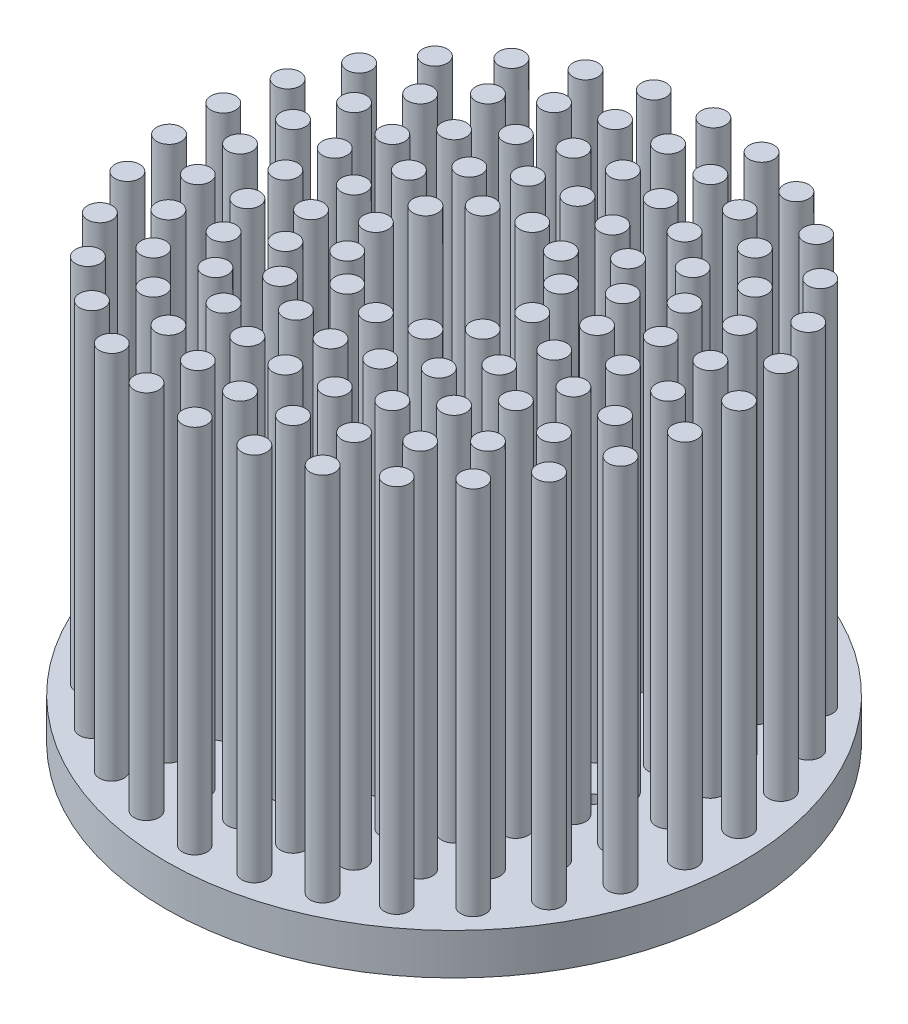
SolidWorks part; units mm, degrees
ref_plane "前基準面" through (0, 0, 0) normal (0, 0, 1) x (1, 0, 0)
ref_plane "上基準面" through (0, 0, 0) normal (0, 1, 0) x (1, 0, 0)
ref_plane "右基準面" through (0, 0, 0) normal (1, 0, 0) x (0, 0, -1)
sketch "草圖1" plane through (0, 0, 0) normal (0, 1, 0) x (1, 0, 0)
  circle A0 centre (0, 0) radius 35
  dimension "D1" = 70
extrude "填料-伸長1" add sketch "草圖1" along normal blind 3
sketch "草圖2" plane through (0, 3, 0) normal (0, 1, 0) x (1, 0, 0)
  line L0 (0, 0) -> (0, 50000) construction
  circle A68 centre (0, 0) radius 1.5
  dimension "D1" = 3
  dimension "D3" = 4
  dimension "D2" = 5
extrude "填料-伸長2" add sketch "草圖2" along normal blind 27
sketch "草圖6" plane through (0, 3, 0) normal (0, 1, 0) x (1, 0, 0)
  circle A0 centre (0, 5.5) radius 1.5
  circle A2 centre (0, 0) radius 1.5 construction
  circle A3 centre (0, 0) radius 1.5 construction
  dimension "D1" = 2.5
extrude "填料-伸長4" add sketch "草圖6" along normal up to surface (27 mm away)
pattern_circular "環狀複製排列3" count 6 over 360 about axis through (0, 0, 0) along (0, 1, 0) of "填料-伸長4"
sketch "草圖7" plane through (0, 3, 0) normal (0, 1, 0) x (1, 0, 0)
  circle A0 centre (0, 9.5) radius 1.5
  circle A1 centre (0, 5.5) radius 1.5 construction
  dimension "D1" = 1
extrude "填料-伸長5" add sketch "草圖7" along normal up to surface (27 mm away)
pattern_circular "環狀複製排列4" count 12 over 360 about axis through (0, 0, 0) along (0, 1, 0) of "填料-伸長5"
sketch "草圖8" plane through (0, 3, 0) normal (0, 1, 0) x (1, 0, 0)
  circle A0 centre (0, 15) radius 1.5
  circle A1 centre (0, 9.5) radius 1.5 construction
  circle A2 centre (0, 9.5) radius 1.5 construction
  dimension "D1" = 2.5
extrude "填料-伸長6" add sketch "草圖8" along normal up to surface (27 mm away)
pattern_circular "環狀複製排列5" count 18 over 360 about axis through (0, 0, 0) along (0, 1, 0) of "填料-伸長6"
sketch "草圖10" plane through (0, 3, 0) normal (0, 1, 0) x (1, 0, 0)
  circle A0 centre (0, 20.5) radius 1.5
  circle A1 centre (0, 15) radius 1.5 construction
  dimension "D1" = 2.5
extrude "填料-伸長7" add sketch "草圖10" along normal up to surface (27 mm away)
pattern_circular "環狀複製排列6" count 24 over 360 about axis through (0, 0, 0) along (0, 1, 0) of "填料-伸長7"
sketch "草圖11" plane through (0, 3, 0) normal (0, 1, 0) x (1, 0, 0)
  circle A0 centre (0, 26) radius 1.5
  circle A1 centre (0, 20.5) radius 1.5 construction
  dimension "D1" = 2.5
extrude "填料-伸長8" add sketch "草圖11" along normal up to surface (27 mm away)
pattern_circular "環狀複製排列7" count 28 over 360 about axis through (0, 0, 0) along (0, 1, 0) of "填料-伸長8"
sketch "草圖13" plane through (0, 3, 0) normal (0, 1, 0) x (1, 0, 0)
  circle A0 centre (0, 0) radius 7
  circle A1 centre (4.7631, -2.75) radius 1.5 construction
extrude "除料-伸長3" cut sketch "草圖13" along normal up to surface (27 mm away)
sketch "草圖15" plane through (0, 3, 0) normal (0, 1, 0) x (1, 0, 0)
  circle A0 centre (0, 0) radius 5.75 construction
  circle A1 centre (0, 4) radius 1.5
  circle A2 centre (0, 9.5) radius 1.5 construction
  circle A4 centre (0, 9.5) radius 1.5 construction
  dimension "D1" = 11.5
  dimension "D2" = 2.5
extrude "填料-伸長10" add sketch "草圖15" along normal up to surface (27 mm away)
pattern_circular "環狀複製排列8" count 5 over 360 about axis through (0, 0, 0) along (0, 1, 0) of "填料-伸長10"
sketch "草圖16" plane through (0, 3, 0) normal (0, 1, 0) x (1, 0, 0)
  circle A0 centre (-5.3058, 19.8015) radius 1.5 construction
  circle A1 centre (20.3276, 16.2107) radius 1.5
  circle A2 centre (20.3276, 16.2107) radius 1.5
  circle A3 centre (11.281, -23.4252) radius 1.5
  circle A4 centre (11.281, -23.4252) radius 1.5
  circle A5 centre (0, -20.5) radius 1.5
  circle A6 centre (0, -20.5) radius 1.5
  circle A7 centre (-5.7855, -25.3481) radius 1.5
  circle A8 centre (-5.7855, -25.3481) radius 1.5
  circle A9 centre (-10.25, -17.7535) radius 1.5
  circle A10 centre (-10.25, -17.7535) radius 1.5
  circle A11 centre (-25.3481, -5.7855) radius 1.5
  circle A12 centre (-25.3481, -5.7855) radius 1.5
  circle A13 centre (9.6418, 11.4907) radius 1.5
  circle A14 centre (9.6418, 11.4907) radius 1.5
  circle A15 centre (12.9904, 7.5) radius 1.5
  circle A16 centre (12.9904, 7.5) radius 1.5
  circle A17 centre (2.3511, -3.2361) radius 1.5
  circle A18 centre (2.3511, -3.2361) radius 1.5
  circle A19 centre (0, 4) radius 1.5
  circle A20 centre (0, 4) radius 1.5
  circle A21 centre (-12.9904, -7.5) radius 1.5
  circle A22 centre (-12.9904, -7.5) radius 1.5
  circle A23 centre (0, 26) radius 1.5 construction
  circle A24 centre (0, 20.5) radius 1.5 construction
  circle A25 centre (5.7855, 25.3481) radius 1.5 construction
  circle A26 centre (5.3058, 19.8015) radius 1.5 construction
  circle A27 centre (16.2107, 20.3276) radius 1.5 construction
  circle A28 centre (14.4957, 14.4957) radius 1.5 construction
  circle A29 centre (23.4252, 11.281) radius 1.5 construction
  circle A30 centre (25.3481, 5.7855) radius 1.5 construction
  circle A31 centre (19.8015, 5.3058) radius 1.5 construction
  circle A32 centre (20.5, 0) radius 1.5 construction
  circle A33 centre (26, 0) radius 1.5 construction
  circle A34 centre (25.3481, -5.7855) radius 1.5 construction
  circle A35 centre (19.8015, -5.3058) radius 1.5 construction
  circle A36 centre (23.4252, -11.281) radius 1.5 construction
  circle A37 centre (20.3276, -16.2107) radius 1.5 construction
  circle A38 centre (14.4957, -14.4957) radius 1.5 construction
  circle A39 centre (10.25, -17.7535) radius 1.5 construction
  circle A40 centre (5.3058, -19.8015) radius 1.5 construction
  circle A41 centre (-5.3058, -19.8015) radius 1.5 construction
  circle A42 centre (-14.4957, -14.4957) radius 1.5 construction
  circle A43 centre (-23.4252, -11.281) radius 1.5 construction
  circle A44 centre (-17.7535, -10.25) radius 1.5 construction
  circle A45 centre (-19.8015, -5.3058) radius 1.5 construction
  circle A46 centre (-26, 0) radius 1.5 construction
  circle A47 centre (-20.5, 0) radius 1.5 construction
  circle A48 centre (-19.8015, 5.3058) radius 1.5 construction
  circle A49 centre (-17.7535, 10.25) radius 1.5 construction
  circle A50 centre (-14.4957, 14.4957) radius 1.5 construction
  circle A51 centre (-20.3276, 16.2107) radius 1.5 construction
  circle A52 centre (-16.2107, 20.3276) radius 1.5 construction
  circle A53 centre (-11.281, 23.4252) radius 1.5 construction
  circle A54 centre (-5.1303, 14.0954) radius 1.5 construction
  circle A55 centre (0, 15) radius 1.5 construction
  circle A56 centre (5.1303, 14.0954) radius 1.5 construction
  circle A57 centre (14.7721, 2.6047) radius 1.5 construction
  circle A58 centre (9.6418, -11.4907) radius 1.5 construction
  circle A59 centre (0, -15) radius 1.5 construction
  circle A60 centre (5.1303, -14.0954) radius 1.5 construction
  circle A61 centre (4.75, -8.2272) radius 1.5 construction
  circle A62 centre (0, -9.5) radius 1.5 construction
  circle A63 centre (-2.3511, -3.2361) radius 1.5 construction
  circle A64 centre (0, 9.5) radius 1.5 construction
  circle A65 centre (-4.75, 8.2272) radius 1.5 construction
  circle A66 centre (-9.6418, 11.4907) radius 1.5 construction
  circle A67 centre (-12.9904, 7.5) radius 1.5 construction
  circle A68 centre (-8.2272, 4.75) radius 1.5 construction
  circle A69 centre (-9.5, 0) radius 1.5 construction
  circle A70 centre (-14.7721, -2.6047) radius 1.5 construction
  circle A71 centre (-14.7721, 2.6047) radius 1.5 construction
  circle A72 centre (-8.2272, -4.75) radius 1.5 construction
  circle A73 centre (-4.75, -8.2272) radius 1.5 construction
  circle A74 centre (-5.1303, -14.0954) radius 1.5 construction
  circle A75 centre (4.75, 8.2272) radius 1.5 construction
  circle A76 centre (8.2272, 4.75) radius 1.5 construction
  circle A77 centre (9.5, 0) radius 1.5 construction
  circle A78 centre (8.2272, -4.75) radius 1.5 construction
  circle A79 centre (-5.7855, 25.3481) radius 1.5 construction
  circle A80 centre (11.281, 23.4252) radius 1.5 construction
  circle A81 centre (10.25, 17.7535) radius 1.5 construction
  circle A82 centre (17.7535, 10.25) radius 1.5 construction
  circle A83 centre (17.7535, -10.25) radius 1.5 construction
  circle A84 centre (16.2107, -20.3276) radius 1.5 construction
  circle A85 centre (5.7855, -25.3481) radius 1.5 construction
  circle A86 centre (0, -26) radius 1.5 construction
  circle A87 centre (-11.281, -23.4252) radius 1.5 construction
  circle A88 centre (-16.2107, -20.3276) radius 1.5 construction
  circle A89 centre (-20.3276, -16.2107) radius 1.5 construction
  circle A90 centre (-25.3481, 5.7855) radius 1.5 construction
  circle A91 centre (-23.4252, 11.281) radius 1.5 construction
  circle A92 centre (-10.25, 17.7535) radius 1.5 construction
  circle A93 centre (14.7721, -2.6047) radius 1.5 construction
  circle A94 centre (12.9904, -7.5) radius 1.5 construction
  circle A95 centre (3.8042, 1.2361) radius 1.5 construction
  circle A96 centre (-9.6418, -11.4907) radius 1.5 construction
  circle A97 centre (-3.8042, 1.2361) radius 1.5 construction
  circle A98 centre (-5.3058, 19.8015) radius 1.5
  circle A99 centre (0, 26) radius 1.5
  circle A100 centre (0, 20.5) radius 1.5
  circle A101 centre (5.7855, 25.3481) radius 1.5
  circle A102 centre (5.3058, 19.8015) radius 1.5
  circle A103 centre (16.2107, 20.3276) radius 1.5
  circle A104 centre (14.4957, 14.4957) radius 1.5
  circle A105 centre (23.4252, 11.281) radius 1.5
  circle A106 centre (25.3481, 5.7855) radius 1.5
  circle A107 centre (19.8015, 5.3058) radius 1.5
  circle A108 centre (20.5, 0) radius 1.5
  circle A109 centre (26, 0) radius 1.5
  circle A110 centre (25.3481, -5.7855) radius 1.5
  circle A111 centre (19.8015, -5.3058) radius 1.5
  circle A112 centre (23.4252, -11.281) radius 1.5
  circle A113 centre (20.3276, -16.2107) radius 1.5
  circle A114 centre (14.4957, -14.4957) radius 1.5
  circle A115 centre (10.25, -17.7535) radius 1.5
  circle A116 centre (5.3058, -19.8015) radius 1.5
  circle A117 centre (-5.3058, -19.8015) radius 1.5
  circle A118 centre (-14.4957, -14.4957) radius 1.5
  circle A119 centre (-23.4252, -11.281) radius 1.5
  circle A120 centre (-17.7535, -10.25) radius 1.5
  circle A121 centre (-19.8015, -5.3058) radius 1.5
  circle A122 centre (-26, 0) radius 1.5
  circle A123 centre (-20.5, 0) radius 1.5
  circle A124 centre (-19.8015, 5.3058) radius 1.5
  circle A125 centre (-17.7535, 10.25) radius 1.5
  circle A126 centre (-14.4957, 14.4957) radius 1.5
  circle A127 centre (-20.3276, 16.2107) radius 1.5
  circle A128 centre (-16.2107, 20.3276) radius 1.5
  circle A129 centre (-11.281, 23.4252) radius 1.5
  circle A130 centre (-5.1303, 14.0954) radius 1.5
  circle A131 centre (0, 15) radius 1.5
  circle A132 centre (5.1303, 14.0954) radius 1.5
  circle A133 centre (14.7721, 2.6047) radius 1.5
  circle A134 centre (9.6418, -11.4907) radius 1.5
  circle A135 centre (0, -15) radius 1.5
  circle A136 centre (5.1303, -14.0954) radius 1.5
  circle A137 centre (4.75, -8.2272) radius 1.5
  circle A138 centre (0, -9.5) radius 1.5
  circle A139 centre (-2.3511, -3.2361) radius 1.5
  circle A140 centre (0, 9.5) radius 1.5
  circle A141 centre (-4.75, 8.2272) radius 1.5
  circle A142 centre (-9.6418, 11.4907) radius 1.5
  circle A143 centre (-12.9904, 7.5) radius 1.5
  circle A144 centre (-8.2272, 4.75) radius 1.5
  circle A145 centre (-9.5, 0) radius 1.5
  circle A146 centre (-14.7721, -2.6047) radius 1.5
  circle A147 centre (-14.7721, 2.6047) radius 1.5
  circle A148 centre (-8.2272, -4.75) radius 1.5
  circle A149 centre (-4.75, -8.2272) radius 1.5
  circle A150 centre (-5.1303, -14.0954) radius 1.5
  circle A151 centre (4.75, 8.2272) radius 1.5
  circle A152 centre (8.2272, 4.75) radius 1.5
  circle A153 centre (9.5, 0) radius 1.5
  circle A154 centre (8.2272, -4.75) radius 1.5
  circle A155 centre (-5.7855, 25.3481) radius 1.5
  circle A156 centre (11.281, 23.4252) radius 1.5
  circle A157 centre (10.25, 17.7535) radius 1.5
  circle A158 centre (17.7535, 10.25) radius 1.5
  circle A159 centre (17.7535, -10.25) radius 1.5
  circle A160 centre (16.2107, -20.3276) radius 1.5
  circle A161 centre (5.7855, -25.3481) radius 1.5
  circle A162 centre (0, -26) radius 1.5
  circle A163 centre (-11.281, -23.4252) radius 1.5
  circle A164 centre (-16.2107, -20.3276) radius 1.5
  circle A165 centre (-20.3276, -16.2107) radius 1.5
  circle A166 centre (-25.3481, 5.7855) radius 1.5
  circle A167 centre (-23.4252, 11.281) radius 1.5
  circle A168 centre (-10.25, 17.7535) radius 1.5
  circle A169 centre (14.7721, -2.6047) radius 1.5
  circle A170 centre (12.9904, -7.5) radius 1.5
  circle A171 centre (3.8042, 1.2361) radius 1.5
  circle A172 centre (-9.6418, -11.4907) radius 1.5
  circle A173 centre (-3.8042, 1.2361) radius 1.5
  dimension "D1" = 0
  dimension "D2" = 0
  dimension "D3" = 0
  dimension "D4" = 0
  dimension "D5" = 0
  dimension "D6" = 0
  dimension "D7" = 0
  dimension "D8" = 0
  dimension "D9" = 0
  dimension "D10" = 0
  dimension "D11" = 0
sketch "草圖23" plane through (0, 3, 0) normal (0, 1, 0) x (1, 0, 0)
  circle A0 centre (0, 31.5) radius 1.5
  circle A1 centre (0, 26) radius 1.5 construction
  dimension "D1" = 5.5
extrude "填料-伸長16" add sketch "草圖23" along normal up to surface (27 mm away)
pattern_circular "環狀複製排列9" count 30 over 360 about axis through (0, 0, 0) along (0, 1, 0) of "填料-伸長16"
sketch "草圖25" plane through (0, 3, 0) normal (0, 1, 0) x (1, 0, 0)
  circle A0 centre (0, 31.5) radius 1.5 construction
  circle A1 centre (6.5492, 30.8116) radius 1.5 construction
  circle A2 centre (12.8122, 28.7767) radius 1.5 construction
  circle A3 centre (11.281, 23.4252) radius 1.5 construction
  circle A4 centre (18.5152, 25.484) radius 1.5 construction
  circle A5 centre (23.4091, 21.0776) radius 1.5 construction
  circle A6 centre (27.2798, 15.75) radius 1.5 construction
  circle A7 centre (25.3481, 5.7855) radius 1.5 construction
  circle A8 centre (17.7535, 10.25) radius 1.5 construction
  circle A9 centre (0, 15) radius 1.5 construction
  circle A10 centre (0, 20.5) radius 1.5 construction
  circle A11 centre (-5.3058, 19.8015) radius 1.5 construction
  circle A12 centre (-5.7855, 25.3481) radius 1.5 construction
  circle A13 centre (-11.281, 23.4252) radius 1.5 construction
  circle A14 centre (-16.2107, 20.3276) radius 1.5 construction
  circle A15 centre (-23.4091, 21.0776) radius 1.5 construction
  circle A16 centre (-20.3276, 16.2107) radius 1.5 construction
  circle A17 centre (-27.2798, 15.75) radius 1.5 construction
  circle A18 centre (-25.3481, 5.7855) radius 1.5 construction
  circle A19 centre (-29.9583, 9.734) radius 1.5 construction
  circle A20 centre (-31.3274, 3.2926) radius 1.5 construction
  circle A21 centre (-31.3274, -3.2926) radius 1.5 construction
  circle A22 centre (-25.3481, -5.7855) radius 1.5 construction
  circle A23 centre (-27.2798, -15.75) radius 1.5 construction
  circle A24 centre (-20.3276, -16.2107) radius 1.5 construction
  circle A25 centre (-11.281, -23.4252) radius 1.5 construction
  circle A26 centre (-5.7855, -25.3481) radius 1.5 construction
  circle A27 centre (0, -26) radius 1.5 construction
  circle A28 centre (11.281, -23.4252) radius 1.5 construction
  circle A29 centre (18.5152, -25.484) radius 1.5 construction
  circle A30 centre (16.2107, -20.3276) radius 1.5 construction
  circle A31 centre (23.4091, -21.0776) radius 1.5 construction
  circle A32 centre (20.3276, -16.2107) radius 1.5 construction
  circle A33 centre (27.2798, -15.75) radius 1.5 construction
  circle A34 centre (29.9583, -9.734) radius 1.5 construction
  circle A35 centre (31.3274, 3.2926) radius 1.5 construction
  circle A36 centre (31.3274, -3.2926) radius 1.5 construction
  circle A37 centre (26, 0) radius 1.5 construction
  circle A38 centre (19.8015, -5.3058) radius 1.5 construction
  circle A39 centre (3.8042, 1.2361) radius 1.5 construction
  circle A40 centre (8.2272, 4.75) radius 1.5 construction
  circle A41 centre (14.7721, 2.6047) radius 1.5 construction
  circle A42 centre (12.9904, 7.5) radius 1.5 construction
  circle A43 centre (9.6418, 11.4907) radius 1.5 construction
  circle A44 centre (-4.75, 8.2272) radius 1.5 construction
  circle A45 centre (-10.25, 17.7535) radius 1.5 construction
  circle A46 centre (-14.4957, 14.4957) radius 1.5 construction
  circle A47 centre (-9.6418, 11.4907) radius 1.5 construction
  circle A48 centre (-12.9904, 7.5) radius 1.5 construction
  circle A49 centre (-17.7535, 10.25) radius 1.5 construction
  circle A50 centre (-19.8015, 5.3058) radius 1.5 construction
  circle A51 centre (-19.8015, -5.3058) radius 1.5 construction
  circle A52 centre (-14.7721, -2.6047) radius 1.5 construction
  circle A53 centre (-17.7535, -10.25) radius 1.5 construction
  circle A54 centre (-10.25, -17.7535) radius 1.5 construction
  circle A55 centre (-5.1303, -14.0954) radius 1.5 construction
  circle A56 centre (-4.75, -8.2272) radius 1.5 construction
  circle A57 centre (-8.2272, -4.75) radius 1.5 construction
  circle A58 centre (-9.5, 0) radius 1.5 construction
  circle A59 centre (-8.2272, 4.75) radius 1.5 construction
  circle A60 centre (0, 4) radius 1.5 construction
  circle A61 centre (2.3511, -3.2361) radius 1.5 construction
  circle A62 centre (8.2272, -4.75) radius 1.5 construction
  circle A63 centre (0, -9.5) radius 1.5 construction
  circle A64 centre (5.1303, -14.0954) radius 1.5 construction
  circle A65 centre (9.6418, -11.4907) radius 1.5 construction
  circle A66 centre (12.9904, -7.5) radius 1.5 construction
  circle A67 centre (-5.3058, -19.8015) radius 1.5 construction
  circle A68 centre (-6.5492, 30.8116) radius 1.5 construction
  circle A69 centre (0, 26) radius 1.5 construction
  circle A70 centre (5.7855, 25.3481) radius 1.5 construction
  circle A71 centre (16.2107, 20.3276) radius 1.5 construction
  circle A72 centre (20.3276, 16.2107) radius 1.5 construction
  circle A73 centre (23.4252, 11.281) radius 1.5 construction
  circle A74 centre (29.9583, 9.734) radius 1.5 construction
  circle A75 centre (19.8015, 5.3058) radius 1.5 construction
  circle A76 centre (14.4957, 14.4957) radius 1.5 construction
  circle A77 centre (10.25, 17.7535) radius 1.5 construction
  circle A78 centre (5.3058, 19.8015) radius 1.5 construction
  circle A79 centre (5.1303, 14.0954) radius 1.5 construction
  circle A80 centre (-12.8122, 28.7767) radius 1.5 construction
  circle A81 centre (-18.5152, 25.484) radius 1.5 construction
  circle A82 centre (-23.4252, 11.281) radius 1.5 construction
  circle A83 centre (-26, 0) radius 1.5 construction
  circle A84 centre (-29.9583, -9.734) radius 1.5 construction
  circle A85 centre (-23.4252, -11.281) radius 1.5 construction
  circle A86 centre (-23.4091, -21.0776) radius 1.5 construction
  circle A87 centre (-16.2107, -20.3276) radius 1.5 construction
  circle A88 centre (-18.5152, -25.484) radius 1.5 construction
  circle A89 centre (-12.8122, -28.7767) radius 1.5 construction
  circle A90 centre (-6.5492, -30.8116) radius 1.5 construction
  circle A91 centre (0, -31.5) radius 1.5 construction
  circle A92 centre (5.7855, -25.3481) radius 1.5 construction
  circle A93 centre (6.5492, -30.8116) radius 1.5 construction
  circle A94 centre (12.8122, -28.7767) radius 1.5 construction
  circle A95 centre (23.4252, -11.281) radius 1.5 construction
  circle A96 centre (25.3481, -5.7855) radius 1.5 construction
  circle A97 centre (20.5, 0) radius 1.5 construction
  circle A98 centre (14.7721, -2.6047) radius 1.5 construction
  circle A99 centre (9.5, 0) radius 1.5 construction
  circle A100 centre (4.75, 8.2272) radius 1.5 construction
  circle A101 centre (0, 9.5) radius 1.5 construction
  circle A102 centre (-5.1303, 14.0954) radius 1.5 construction
  circle A103 centre (-14.7721, 2.6047) radius 1.5 construction
  circle A104 centre (-20.5, 0) radius 1.5 construction
  circle A105 centre (-12.9904, -7.5) radius 1.5 construction
  circle A106 centre (-9.6418, -11.4907) radius 1.5 construction
  circle A107 centre (-14.4957, -14.4957) radius 1.5 construction
  circle A108 centre (-3.8042, 1.2361) radius 1.5 construction
  circle A109 centre (-2.3511, -3.2361) radius 1.5 construction
  circle A110 centre (4.75, -8.2272) radius 1.5 construction
  circle A111 centre (0, -15) radius 1.5 construction
  circle A112 centre (17.7535, -10.25) radius 1.5 construction
  circle A113 centre (14.4957, -14.4957) radius 1.5 construction
  circle A114 centre (10.25, -17.7535) radius 1.5 construction
  circle A115 centre (5.3058, -19.8015) radius 1.5 construction
  circle A116 centre (0, -20.5) radius 1.5 construction
  circle A117 centre (0, 31.5) radius 1.5
  circle A118 centre (6.5492, 30.8116) radius 1.5
  circle A119 centre (12.8122, 28.7767) radius 1.5
  circle A120 centre (11.281, 23.4252) radius 1.5
  circle A121 centre (18.5152, 25.484) radius 1.5
  circle A122 centre (23.4091, 21.0776) radius 1.5
  circle A123 centre (27.2798, 15.75) radius 1.5
  circle A124 centre (25.3481, 5.7855) radius 1.5
  circle A125 centre (17.7535, 10.25) radius 1.5
  circle A126 centre (0, 15) radius 1.5
  circle A127 centre (0, 20.5) radius 1.5
  circle A128 centre (-5.3058, 19.8015) radius 1.5
  circle A129 centre (-5.7855, 25.3481) radius 1.5
  circle A130 centre (-11.281, 23.4252) radius 1.5
  circle A131 centre (-16.2107, 20.3276) radius 1.5
  circle A132 centre (-23.4091, 21.0776) radius 1.5
  circle A133 centre (-20.3276, 16.2107) radius 1.5
  circle A134 centre (-27.2798, 15.75) radius 1.5
  circle A135 centre (-25.3481, 5.7855) radius 1.5
  circle A136 centre (-29.9583, 9.734) radius 1.5
  circle A137 centre (-31.3274, 3.2926) radius 1.5
  circle A138 centre (-31.3274, -3.2926) radius 1.5
  circle A139 centre (-25.3481, -5.7855) radius 1.5
  circle A140 centre (-27.2798, -15.75) radius 1.5
  circle A141 centre (-20.3276, -16.2107) radius 1.5
  circle A142 centre (-11.281, -23.4252) radius 1.5
  circle A143 centre (-5.7855, -25.3481) radius 1.5
  circle A144 centre (0, -26) radius 1.5
  circle A145 centre (11.281, -23.4252) radius 1.5
  circle A146 centre (18.5152, -25.484) radius 1.5
  circle A147 centre (16.2107, -20.3276) radius 1.5
  circle A148 centre (23.4091, -21.0776) radius 1.5
  circle A149 centre (20.3276, -16.2107) radius 1.5
  circle A150 centre (27.2798, -15.75) radius 1.5
  circle A151 centre (29.9583, -9.734) radius 1.5
  circle A152 centre (31.3274, 3.2926) radius 1.5
  circle A153 centre (31.3274, -3.2926) radius 1.5
  circle A154 centre (26, 0) radius 1.5
  circle A155 centre (19.8015, -5.3058) radius 1.5
  circle A156 centre (3.8042, 1.2361) radius 1.5
  circle A157 centre (8.2272, 4.75) radius 1.5
  circle A158 centre (14.7721, 2.6047) radius 1.5
  circle A159 centre (12.9904, 7.5) radius 1.5
  circle A160 centre (9.6418, 11.4907) radius 1.5
  circle A161 centre (-4.75, 8.2272) radius 1.5
  circle A162 centre (-10.25, 17.7535) radius 1.5
  circle A163 centre (-14.4957, 14.4957) radius 1.5
  circle A164 centre (-9.6418, 11.4907) radius 1.5
  circle A165 centre (-12.9904, 7.5) radius 1.5
  circle A166 centre (-17.7535, 10.25) radius 1.5
  circle A167 centre (-19.8015, 5.3058) radius 1.5
  circle A168 centre (-19.8015, -5.3058) radius 1.5
  circle A169 centre (-14.7721, -2.6047) radius 1.5
  circle A170 centre (-17.7535, -10.25) radius 1.5
  circle A171 centre (-10.25, -17.7535) radius 1.5
  circle A172 centre (-5.1303, -14.0954) radius 1.5
  circle A173 centre (-4.75, -8.2272) radius 1.5
  circle A174 centre (-8.2272, -4.75) radius 1.5
  circle A175 centre (-9.5, 0) radius 1.5
  circle A176 centre (-8.2272, 4.75) radius 1.5
  circle A177 centre (0, 4) radius 1.5
  circle A178 centre (2.3511, -3.2361) radius 1.5
  circle A179 centre (8.2272, -4.75) radius 1.5
  circle A180 centre (0, -9.5) radius 1.5
  circle A181 centre (5.1303, -14.0954) radius 1.5
  circle A182 centre (9.6418, -11.4907) radius 1.5
  circle A183 centre (12.9904, -7.5) radius 1.5
  circle A184 centre (-5.3058, -19.8015) radius 1.5
  circle A185 centre (-6.5492, 30.8116) radius 1.5
  circle A186 centre (0, 26) radius 1.5
  circle A187 centre (5.7855, 25.3481) radius 1.5
  circle A188 centre (16.2107, 20.3276) radius 1.5
  circle A189 centre (20.3276, 16.2107) radius 1.5
  circle A190 centre (23.4252, 11.281) radius 1.5
  circle A191 centre (29.9583, 9.734) radius 1.5
  circle A192 centre (19.8015, 5.3058) radius 1.5
  circle A193 centre (14.4957, 14.4957) radius 1.5
  circle A194 centre (10.25, 17.7535) radius 1.5
  circle A195 centre (5.3058, 19.8015) radius 1.5
  circle A196 centre (5.1303, 14.0954) radius 1.5
  circle A197 centre (-12.8122, 28.7767) radius 1.5
  circle A198 centre (-18.5152, 25.484) radius 1.5
  circle A199 centre (-23.4252, 11.281) radius 1.5
  circle A200 centre (-26, 0) radius 1.5
  circle A201 centre (-29.9583, -9.734) radius 1.5
  circle A202 centre (-23.4252, -11.281) radius 1.5
  circle A203 centre (-23.4091, -21.0776) radius 1.5
  circle A204 centre (-16.2107, -20.3276) radius 1.5
  circle A205 centre (-18.5152, -25.484) radius 1.5
  circle A206 centre (-12.8122, -28.7767) radius 1.5
  circle A207 centre (-6.5492, -30.8116) radius 1.5
  circle A208 centre (0, -31.5) radius 1.5
  circle A209 centre (5.7855, -25.3481) radius 1.5
  circle A210 centre (6.5492, -30.8116) radius 1.5
  circle A211 centre (12.8122, -28.7767) radius 1.5
  circle A212 centre (23.4252, -11.281) radius 1.5
  circle A213 centre (25.3481, -5.7855) radius 1.5
  circle A214 centre (20.5, 0) radius 1.5
  circle A215 centre (14.7721, -2.6047) radius 1.5
  circle A216 centre (9.5, 0) radius 1.5
  circle A217 centre (4.75, 8.2272) radius 1.5
  circle A218 centre (0, 9.5) radius 1.5
  circle A219 centre (-5.1303, 14.0954) radius 1.5
  circle A220 centre (-14.7721, 2.6047) radius 1.5
  circle A221 centre (-20.5, 0) radius 1.5
  circle A222 centre (-12.9904, -7.5) radius 1.5
  circle A223 centre (-9.6418, -11.4907) radius 1.5
  circle A224 centre (-14.4957, -14.4957) radius 1.5
  circle A225 centre (-3.8042, 1.2361) radius 1.5
  circle A226 centre (-2.3511, -3.2361) radius 1.5
  circle A227 centre (4.75, -8.2272) radius 1.5
  circle A228 centre (0, -15) radius 1.5
  circle A229 centre (17.7535, -10.25) radius 1.5
  circle A230 centre (14.4957, -14.4957) radius 1.5
  circle A231 centre (10.25, -17.7535) radius 1.5
  circle A232 centre (5.3058, -19.8015) radius 1.5
  circle A233 centre (0, -20.5) radius 1.5
sketch "草圖24" [suppressed] plane through (0, 3, 0) normal (0, 1, 0) x (1, 0, 0)
  circle A1 centre (0, 0) radius 35
  circle A2 centre (0, 0) radius 35
  dimension "D1" = 0
extrude "填料-伸長17" [suppressed] add sketch "草圖24" along normal blind 2
sketch "草圖26" plane through (0, 3, 0) normal (0, 1, 0) x (1, 0, 0)
  circle A1 centre (-17.7535, -10.25) radius 1.5
  circle A2 centre (-17.7535, -10.25) radius 1.5
  circle A3 centre (-14.7721, -2.6047) radius 1.5
  circle A4 centre (-14.7721, -2.6047) radius 1.5
  circle A5 centre (-19.8015, -5.3058) radius 1.5
  circle A6 centre (-19.8015, -5.3058) radius 1.5
  circle A7 centre (-19.8015, 5.3058) radius 1.5
  circle A8 centre (-19.8015, 5.3058) radius 1.5
  circle A9 centre (-17.7535, 10.25) radius 1.5
  circle A10 centre (-17.7535, 10.25) radius 1.5
  circle A11 centre (-12.9904, 7.5) radius 1.5
  circle A12 centre (-12.9904, 7.5) radius 1.5
  circle A13 centre (-9.6418, 11.4907) radius 1.5
  circle A14 centre (-9.6418, 11.4907) radius 1.5
  circle A15 centre (-14.4957, 14.4957) radius 1.5
  circle A16 centre (-14.4957, 14.4957) radius 1.5
  circle A17 centre (-10.25, 17.7535) radius 1.5
  circle A18 centre (-10.25, 17.7535) radius 1.5
  circle A19 centre (-4.75, 8.2272) radius 1.5
  circle A20 centre (-4.75, 8.2272) radius 1.5
  circle A21 centre (9.6418, 11.4907) radius 1.5
  circle A22 centre (9.6418, 11.4907) radius 1.5
  circle A23 centre (12.9904, 7.5) radius 1.5
  circle A24 centre (12.9904, 7.5) radius 1.5
  circle A25 centre (14.7721, 2.6047) radius 1.5
  circle A26 centre (14.7721, 2.6047) radius 1.5
  circle A27 centre (8.2272, 4.75) radius 1.5
  circle A28 centre (8.2272, 4.75) radius 1.5
  circle A29 centre (3.8042, 1.2361) radius 1.5
  circle A30 centre (3.8042, 1.2361) radius 1.5
  circle A31 centre (19.8015, -5.3058) radius 1.5
  circle A32 centre (19.8015, -5.3058) radius 1.5
  circle A33 centre (0, 26) radius 1.5
  circle A34 centre (0, 26) radius 1.5
  circle A35 centre (-6.5492, 30.8116) radius 1.5
  circle A36 centre (-6.5492, 30.8116) radius 1.5
  circle A37 centre (-5.3058, -19.8015) radius 1.5
  circle A38 centre (-5.3058, -19.8015) radius 1.5
  circle A39 centre (12.9904, -7.5) radius 1.5
  circle A40 centre (12.9904, -7.5) radius 1.5
  circle A41 centre (9.6418, -11.4907) radius 1.5
  circle A42 centre (9.6418, -11.4907) radius 1.5
  circle A43 centre (5.1303, -14.0954) radius 1.5
  circle A44 centre (5.1303, -14.0954) radius 1.5
  circle A45 centre (0, -9.5) radius 1.5
  circle A46 centre (0, -9.5) radius 1.5
  circle A47 centre (8.2272, -4.75) radius 1.5
  circle A48 centre (8.2272, -4.75) radius 1.5
  circle A49 centre (2.3511, -3.2361) radius 1.5
  circle A50 centre (2.3511, -3.2361) radius 1.5
  circle A51 centre (0, 4) radius 1.5
  circle A52 centre (0, 4) radius 1.5
  circle A53 centre (-8.2272, 4.75) radius 1.5
  circle A54 centre (-8.2272, 4.75) radius 1.5
  circle A55 centre (-9.5, 0) radius 1.5
  circle A56 centre (-9.5, 0) radius 1.5
  circle A57 centre (-8.2272, -4.75) radius 1.5
  circle A58 centre (-8.2272, -4.75) radius 1.5
  circle A59 centre (-4.75, -8.2272) radius 1.5
  circle A60 centre (-4.75, -8.2272) radius 1.5
  circle A61 centre (-5.1303, -14.0954) radius 1.5
  circle A62 centre (-5.1303, -14.0954) radius 1.5
  circle A63 centre (-10.25, -17.7535) radius 1.5
  circle A64 centre (-10.25, -17.7535) radius 1.5
  circle A65 centre (-23.4252, -11.281) radius 1.5
  circle A66 centre (-23.4252, -11.281) radius 1.5
  circle A67 centre (-29.9583, -9.734) radius 1.5
  circle A68 centre (-29.9583, -9.734) radius 1.5
  circle A69 centre (-26, 0) radius 1.5
  circle A70 centre (-26, 0) radius 1.5
  circle A71 centre (-23.4252, 11.281) radius 1.5
  circle A72 centre (-23.4252, 11.281) radius 1.5
  circle A73 centre (-18.5152, 25.484) radius 1.5
  circle A74 centre (-18.5152, 25.484) radius 1.5
  circle A75 centre (-12.8122, 28.7767) radius 1.5
  circle A76 centre (-12.8122, 28.7767) radius 1.5
  circle A77 centre (5.1303, 14.0954) radius 1.5
  circle A78 centre (5.1303, 14.0954) radius 1.5
  circle A79 centre (5.3058, 19.8015) radius 1.5
  circle A80 centre (5.3058, 19.8015) radius 1.5
  circle A81 centre (10.25, 17.7535) radius 1.5
  circle A82 centre (10.25, 17.7535) radius 1.5
  circle A83 centre (14.4957, 14.4957) radius 1.5
  circle A84 centre (14.4957, 14.4957) radius 1.5
  circle A85 centre (19.8015, 5.3058) radius 1.5
  circle A86 centre (19.8015, 5.3058) radius 1.5
  circle A87 centre (29.9583, 9.734) radius 1.5
  circle A88 centre (29.9583, 9.734) radius 1.5
  circle A89 centre (23.4252, 11.281) radius 1.5
  circle A90 centre (23.4252, 11.281) radius 1.5
  circle A91 centre (20.3276, 16.2107) radius 1.5
  circle A92 centre (20.3276, 16.2107) radius 1.5
  circle A93 centre (16.2107, 20.3276) radius 1.5
  circle A94 centre (16.2107, 20.3276) radius 1.5
  circle A95 centre (5.7855, 25.3481) radius 1.5
  circle A96 centre (5.7855, 25.3481) radius 1.5
  circle A97 centre (0, 9.5) radius 1.5
  circle A98 centre (0, 9.5) radius 1.5
  circle A99 centre (4.75, 8.2272) radius 1.5
  circle A100 centre (4.75, 8.2272) radius 1.5
  circle A101 centre (9.5, 0) radius 1.5
  circle A102 centre (9.5, 0) radius 1.5
  circle A103 centre (14.7721, -2.6047) radius 1.5
  circle A104 centre (14.7721, -2.6047) radius 1.5
  circle A105 centre (20.5, 0) radius 1.5
  circle A106 centre (20.5, 0) radius 1.5
  circle A107 centre (25.3481, -5.7855) radius 1.5
  circle A108 centre (25.3481, -5.7855) radius 1.5
  circle A109 centre (23.4252, -11.281) radius 1.5
  circle A110 centre (23.4252, -11.281) radius 1.5
  circle A111 centre (12.8122, -28.7767) radius 1.5
  circle A112 centre (12.8122, -28.7767) radius 1.5
  circle A113 centre (6.5492, -30.8116) radius 1.5
  circle A114 centre (6.5492, -30.8116) radius 1.5
  circle A115 centre (5.7855, -25.3481) radius 1.5
  circle A116 centre (5.7855, -25.3481) radius 1.5
  circle A117 centre (0, -31.5) radius 1.5
  circle A118 centre (0, -31.5) radius 1.5
  circle A119 centre (-6.5492, -30.8116) radius 1.5
  circle A120 centre (-6.5492, -30.8116) radius 1.5
  circle A121 centre (-12.8122, -28.7767) radius 1.5
  circle A122 centre (-12.8122, -28.7767) radius 1.5
  circle A123 centre (-18.5152, -25.484) radius 1.5
  circle A124 centre (-18.5152, -25.484) radius 1.5
  circle A125 centre (-16.2107, -20.3276) radius 1.5
  circle A126 centre (-16.2107, -20.3276) radius 1.5
  circle A127 centre (-23.4091, -21.0776) radius 1.5
  circle A128 centre (-23.4091, -21.0776) radius 1.5
  circle A129 centre (0, -20.5) radius 1.5
  circle A130 centre (0, -20.5) radius 1.5
  circle A131 centre (5.3058, -19.8015) radius 1.5
  circle A132 centre (5.3058, -19.8015) radius 1.5
  circle A133 centre (10.25, -17.7535) radius 1.5
  circle A134 centre (10.25, -17.7535) radius 1.5
  circle A135 centre (14.4957, -14.4957) radius 1.5
  circle A136 centre (14.4957, -14.4957) radius 1.5
  circle A137 centre (17.7535, -10.25) radius 1.5
  circle A138 centre (17.7535, -10.25) radius 1.5
  circle A139 centre (0, -15) radius 1.5
  circle A140 centre (0, -15) radius 1.5
  circle A141 centre (4.75, -8.2272) radius 1.5
  circle A142 centre (4.75, -8.2272) radius 1.5
  circle A143 centre (-2.3511, -3.2361) radius 1.5
  circle A144 centre (-2.3511, -3.2361) radius 1.5
  circle A145 centre (-3.8042, 1.2361) radius 1.5
  circle A146 centre (-3.8042, 1.2361) radius 1.5
  circle A147 centre (-14.4957, -14.4957) radius 1.5
  circle A148 centre (-14.4957, -14.4957) radius 1.5
  circle A149 centre (-9.6418, -11.4907) radius 1.5
  circle A150 centre (-9.6418, -11.4907) radius 1.5
  circle A151 centre (-12.9904, -7.5) radius 1.5
  circle A152 centre (-12.9904, -7.5) radius 1.5
  circle A153 centre (-20.5, 0) radius 1.5
  circle A154 centre (-20.5, 0) radius 1.5
  circle A155 centre (-14.7721, 2.6047) radius 1.5
  circle A156 centre (-14.7721, 2.6047) radius 1.5
  circle A157 centre (-5.1303, 14.0954) radius 1.5
  circle A158 centre (-5.1303, 14.0954) radius 1.5
  circle A159 centre (23.4091, 21.0776) radius 1.5
  circle A160 centre (23.4091, 21.0776) radius 1.5
  circle A161 centre (18.5152, 25.484) radius 1.5
  circle A162 centre (18.5152, 25.484) radius 1.5
  circle A163 centre (11.281, 23.4252) radius 1.5
  circle A164 centre (11.281, 23.4252) radius 1.5
  circle A165 centre (12.8122, 28.7767) radius 1.5
  circle A166 centre (12.8122, 28.7767) radius 1.5
  circle A167 centre (6.5492, 30.8116) radius 1.5
  circle A168 centre (6.5492, 30.8116) radius 1.5
  circle A169 centre (0, 31.5) radius 1.5
  circle A170 centre (0, 31.5) radius 1.5
  circle A171 centre (-31.3274, -3.2926) radius 1.5
  circle A172 centre (-31.3274, -3.2926) radius 1.5
  circle A173 centre (-31.3274, 3.2926) radius 1.5
  circle A174 centre (-31.3274, 3.2926) radius 1.5
  circle A175 centre (-29.9583, 9.734) radius 1.5
  circle A176 centre (-29.9583, 9.734) radius 1.5
  circle A177 centre (-25.3481, 5.7855) radius 1.5
  circle A178 centre (-25.3481, 5.7855) radius 1.5
  circle A179 centre (-27.2798, 15.75) radius 1.5
  circle A180 centre (-27.2798, 15.75) radius 1.5
  circle A181 centre (-20.3276, 16.2107) radius 1.5
  circle A182 centre (-20.3276, 16.2107) radius 1.5
  circle A183 centre (-23.4091, 21.0776) radius 1.5
  circle A184 centre (-23.4091, 21.0776) radius 1.5
  circle A185 centre (-16.2107, 20.3276) radius 1.5
  circle A186 centre (-16.2107, 20.3276) radius 1.5
  circle A187 centre (-11.281, 23.4252) radius 1.5
  circle A188 centre (-11.281, 23.4252) radius 1.5
  circle A189 centre (-5.7855, 25.3481) radius 1.5
  circle A190 centre (-5.7855, 25.3481) radius 1.5
  circle A191 centre (-5.3058, 19.8015) radius 1.5
  circle A192 centre (-5.3058, 19.8015) radius 1.5
  circle A193 centre (0, 20.5) radius 1.5
  circle A194 centre (0, 20.5) radius 1.5
  circle A195 centre (0, 15) radius 1.5
  circle A196 centre (0, 15) radius 1.5
  circle A197 centre (17.7535, 10.25) radius 1.5
  circle A198 centre (17.7535, 10.25) radius 1.5
  circle A199 centre (25.3481, 5.7855) radius 1.5
  circle A200 centre (25.3481, 5.7855) radius 1.5
  circle A201 centre (27.2798, 15.75) radius 1.5
  circle A202 centre (27.2798, 15.75) radius 1.5
  circle A203 centre (26, 0) radius 1.5
  circle A204 centre (26, 0) radius 1.5
  circle A205 centre (31.3274, -3.2926) radius 1.5
  circle A206 centre (31.3274, -3.2926) radius 1.5
  circle A207 centre (31.3274, 3.2926) radius 1.5
  circle A208 centre (31.3274, 3.2926) radius 1.5
  circle A209 centre (29.9583, -9.734) radius 1.5
  circle A210 centre (29.9583, -9.734) radius 1.5
  circle A211 centre (27.2798, -15.75) radius 1.5
  circle A212 centre (27.2798, -15.75) radius 1.5
  circle A213 centre (20.3276, -16.2107) radius 1.5
  circle A214 centre (20.3276, -16.2107) radius 1.5
  circle A215 centre (23.4091, -21.0776) radius 1.5
  circle A216 centre (23.4091, -21.0776) radius 1.5
  circle A217 centre (16.2107, -20.3276) radius 1.5
  circle A218 centre (16.2107, -20.3276) radius 1.5
  circle A219 centre (18.5152, -25.484) radius 1.5
  circle A220 centre (18.5152, -25.484) radius 1.5
  circle A221 centre (11.281, -23.4252) radius 1.5
  circle A222 centre (11.281, -23.4252) radius 1.5
  circle A223 centre (0, -26) radius 1.5
  circle A224 centre (0, -26) radius 1.5
  circle A225 centre (-5.7855, -25.3481) radius 1.5
  circle A226 centre (-5.7855, -25.3481) radius 1.5
  circle A227 centre (-11.281, -23.4252) radius 1.5
  circle A228 centre (-11.281, -23.4252) radius 1.5
  circle A229 centre (-20.3276, -16.2107) radius 1.5
  circle A230 centre (-20.3276, -16.2107) radius 1.5
  circle A231 centre (-27.2798, -15.75) radius 1.5
  circle A232 centre (-27.2798, -15.75) radius 1.5
  circle A233 centre (-25.3481, -5.7855) radius 1.5
  circle A234 centre (-25.3481, -5.7855) radius 1.5
  dimension "D1" = 0
  dimension "D2" = 0
  dimension "D3" = 0
  dimension "D4" = 0
  dimension "D5" = 0
  dimension "D6" = 0
  dimension "D7" = 0
  dimension "D8" = 0
  dimension "D9" = 0
  dimension "D10" = 0
  dimension "D11" = 0
  dimension "D12" = 0
  dimension "D13" = 0
  dimension "D14" = 0
  dimension "D15" = 0
  dimension "D16" = 0
  dimension "D17" = 0
  dimension "D18" = 0
  dimension "D19" = 0
  dimension "D20" = 0
  dimension "D21" = 0
  dimension "D22" = 0
  dimension "D23" = 0
  dimension "D24" = 0
  dimension "D25" = 0
  dimension "D26" = 0
  dimension "D27" = 0
  dimension "D28" = 0
  dimension "D29" = 0
  dimension "D30" = 0
  dimension "D31" = 0
  dimension "D32" = 0
  dimension "D33" = 0
  dimension "D34" = 0
  dimension "D35" = 0
  dimension "D36" = 0
  dimension "D37" = 0
  dimension "D38" = 0
  dimension "D39" = 0
  dimension "D40" = 0
  dimension "D41" = 0
  dimension "D42" = 0
  dimension "D43" = 0
  dimension "D44" = 0
  dimension "D45" = 0
  dimension "D46" = 0
  dimension "D47" = 0
  dimension "D48" = 0
  dimension "D49" = 0
  dimension "D50" = 0
  dimension "D51" = 0
  dimension "D52" = 0
  dimension "D53" = 0
  dimension "D54" = 0
  dimension "D55" = 0
  dimension "D56" = 0
  dimension "D57" = 0
  dimension "D58" = 0
  dimension "D59" = 0
  dimension "D60" = 0
  dimension "D61" = 0
  dimension "D62" = 0
  dimension "D63" = 0
  dimension "D64" = 0
  dimension "D65" = 0
  dimension "D66" = 0
  dimension "D67" = 0
  dimension "D68" = 0
  dimension "D69" = 0
  dimension "D70" = 0
  dimension "D71" = 0
  dimension "D72" = 0
  dimension "D73" = 0
  dimension "D74" = 0
  dimension "D75" = 0
  dimension "D76" = 0
  dimension "D77" = 0
  dimension "D78" = 0
  dimension "D79" = 0
  dimension "D80" = 0
  dimension "D81" = 0
  dimension "D82" = 0
  dimension "D83" = 0
  dimension "D84" = 0
  dimension "D85" = 0
  dimension "D86" = 0
  dimension "D87" = 0
  dimension "D88" = 0
  dimension "D89" = 0
  dimension "D90" = 0
  dimension "D91" = 0
  dimension "D92" = 0
  dimension "D93" = 0
  dimension "D94" = 0
  dimension "D95" = 0
  dimension "D96" = 0
  dimension "D97" = 0
  dimension "D98" = 0
  dimension "D99" = 0
  dimension "D100" = 0
  dimension "D101" = 0
  dimension "D102" = 0
  dimension "D103" = 0
  dimension "D104" = 0
  dimension "D105" = 0
  dimension "D106" = 0
  dimension "D107" = 0
  dimension "D108" = 0
  dimension "D109" = 0
  dimension "D110" = 0
  dimension "D111" = 0
  dimension "D112" = 0
  dimension "D113" = 0
  dimension "D114" = 0
  dimension "D115" = 0
  dimension "D116" = 0
  dimension "D117" = 0
extrude "填料-伸長18" add sketch "草圖26" along normal blind 37
sketch "草圖27" plane through (0, 3, 0) normal (0, 1, 0) x (1, 0, 0)
  circle A1 centre (0, 0) radius 35
  circle A2 centre (0, 0) radius 35
  dimension "D1" = 0
extrude "填料-伸長19" add sketch "草圖27" along normal blind 2
sketch "草圖28" [suppressed] plane through (0, 3, 0) normal (0, 1, 0) x (1, 0, 0)
  circle A1 centre (-17.7535, -10.25) radius 1.5
  circle A2 centre (-17.7535, -10.25) radius 1.5
  circle A3 centre (-14.7721, -2.6047) radius 1.5
  circle A4 centre (-14.7721, -2.6047) radius 1.5
  circle A5 centre (-19.8015, -5.3058) radius 1.5
  circle A6 centre (-19.8015, -5.3058) radius 1.5
  circle A7 centre (-19.8015, 5.3058) radius 1.5
  circle A8 centre (-19.8015, 5.3058) radius 1.5
  circle A9 centre (-17.7535, 10.25) radius 1.5
  circle A10 centre (-17.7535, 10.25) radius 1.5
  circle A11 centre (-12.9904, 7.5) radius 1.5
  circle A12 centre (-12.9904, 7.5) radius 1.5
  circle A13 centre (-9.6418, 11.4907) radius 1.5
  circle A14 centre (-9.6418, 11.4907) radius 1.5
  circle A15 centre (-14.4957, 14.4957) radius 1.5
  circle A16 centre (-14.4957, 14.4957) radius 1.5
  circle A17 centre (-10.25, 17.7535) radius 1.5
  circle A18 centre (-10.25, 17.7535) radius 1.5
  circle A19 centre (-4.75, 8.2272) radius 1.5
  circle A20 centre (-4.75, 8.2272) radius 1.5
  circle A21 centre (9.6418, 11.4907) radius 1.5
  circle A22 centre (9.6418, 11.4907) radius 1.5
  circle A23 centre (12.9904, 7.5) radius 1.5
  circle A24 centre (12.9904, 7.5) radius 1.5
  circle A25 centre (14.7721, 2.6047) radius 1.5
  circle A26 centre (14.7721, 2.6047) radius 1.5
  circle A27 centre (8.2272, 4.75) radius 1.5
  circle A28 centre (8.2272, 4.75) radius 1.5
  circle A29 centre (3.8042, 1.2361) radius 1.5
  circle A30 centre (3.8042, 1.2361) radius 1.5
  circle A31 centre (19.8015, -5.3058) radius 1.5
  circle A32 centre (19.8015, -5.3058) radius 1.5
  circle A33 centre (0, 26) radius 1.5
  circle A34 centre (0, 26) radius 1.5
  circle A35 centre (-6.5492, 30.8116) radius 1.5
  circle A36 centre (-6.5492, 30.8116) radius 1.5
  circle A37 centre (-5.3058, -19.8015) radius 1.5
  circle A38 centre (-5.3058, -19.8015) radius 1.5
  circle A39 centre (12.9904, -7.5) radius 1.5
  circle A40 centre (12.9904, -7.5) radius 1.5
  circle A41 centre (9.6418, -11.4907) radius 1.5
  circle A42 centre (9.6418, -11.4907) radius 1.5
  circle A43 centre (5.1303, -14.0954) radius 1.5
  circle A44 centre (5.1303, -14.0954) radius 1.5
  circle A45 centre (0, -9.5) radius 1.5
  circle A46 centre (0, -9.5) radius 1.5
  circle A47 centre (8.2272, -4.75) radius 1.5
  circle A48 centre (8.2272, -4.75) radius 1.5
  circle A49 centre (2.3511, -3.2361) radius 1.5
  circle A50 centre (2.3511, -3.2361) radius 1.5
  circle A51 centre (0, 4) radius 1.5
  circle A52 centre (0, 4) radius 1.5
  circle A53 centre (-8.2272, 4.75) radius 1.5
  circle A54 centre (-8.2272, 4.75) radius 1.5
  circle A55 centre (-9.5, 0) radius 1.5
  circle A56 centre (-9.5, 0) radius 1.5
  circle A57 centre (-8.2272, -4.75) radius 1.5
  circle A58 centre (-8.2272, -4.75) radius 1.5
  circle A59 centre (-4.75, -8.2272) radius 1.5
  circle A60 centre (-4.75, -8.2272) radius 1.5
  circle A61 centre (-5.1303, -14.0954) radius 1.5
  circle A62 centre (-5.1303, -14.0954) radius 1.5
  circle A63 centre (-10.25, -17.7535) radius 1.5
  circle A64 centre (-10.25, -17.7535) radius 1.5
  circle A65 centre (-23.4252, -11.281) radius 1.5
  circle A66 centre (-23.4252, -11.281) radius 1.5
  circle A67 centre (-29.9583, -9.734) radius 1.5
  circle A68 centre (-29.9583, -9.734) radius 1.5
  circle A69 centre (-26, 0) radius 1.5
  circle A70 centre (-26, 0) radius 1.5
  circle A71 centre (-23.4252, 11.281) radius 1.5
  circle A72 centre (-23.4252, 11.281) radius 1.5
  circle A73 centre (-18.5152, 25.484) radius 1.5
  circle A74 centre (-18.5152, 25.484) radius 1.5
  circle A75 centre (-12.8122, 28.7767) radius 1.5
  circle A76 centre (-12.8122, 28.7767) radius 1.5
  circle A77 centre (5.1303, 14.0954) radius 1.5
  circle A78 centre (5.1303, 14.0954) radius 1.5
  circle A79 centre (5.3058, 19.8015) radius 1.5
  circle A80 centre (5.3058, 19.8015) radius 1.5
  circle A81 centre (10.25, 17.7535) radius 1.5
  circle A82 centre (10.25, 17.7535) radius 1.5
  circle A83 centre (14.4957, 14.4957) radius 1.5
  circle A84 centre (14.4957, 14.4957) radius 1.5
  circle A85 centre (19.8015, 5.3058) radius 1.5
  circle A86 centre (19.8015, 5.3058) radius 1.5
  circle A87 centre (29.9583, 9.734) radius 1.5
  circle A88 centre (29.9583, 9.734) radius 1.5
  circle A89 centre (23.4252, 11.281) radius 1.5
  circle A90 centre (23.4252, 11.281) radius 1.5
  circle A91 centre (20.3276, 16.2107) radius 1.5
  circle A92 centre (20.3276, 16.2107) radius 1.5
  circle A93 centre (16.2107, 20.3276) radius 1.5
  circle A94 centre (16.2107, 20.3276) radius 1.5
  circle A95 centre (5.7855, 25.3481) radius 1.5
  circle A96 centre (5.7855, 25.3481) radius 1.5
  circle A97 centre (0, 9.5) radius 1.5
  circle A98 centre (0, 9.5) radius 1.5
  circle A99 centre (4.75, 8.2272) radius 1.5
  circle A100 centre (4.75, 8.2272) radius 1.5
  circle A101 centre (9.5, 0) radius 1.5
  circle A102 centre (9.5, 0) radius 1.5
  circle A103 centre (14.7721, -2.6047) radius 1.5
  circle A104 centre (14.7721, -2.6047) radius 1.5
  circle A105 centre (20.5, 0) radius 1.5
  circle A106 centre (20.5, 0) radius 1.5
  circle A107 centre (25.3481, -5.7855) radius 1.5
  circle A108 centre (25.3481, -5.7855) radius 1.5
  circle A109 centre (23.4252, -11.281) radius 1.5
  circle A110 centre (23.4252, -11.281) radius 1.5
  circle A111 centre (12.8122, -28.7767) radius 1.5
  circle A112 centre (12.8122, -28.7767) radius 1.5
  circle A113 centre (6.5492, -30.8116) radius 1.5
  circle A114 centre (6.5492, -30.8116) radius 1.5
  circle A115 centre (5.7855, -25.3481) radius 1.5
  circle A116 centre (5.7855, -25.3481) radius 1.5
  circle A117 centre (0, -31.5) radius 1.5
  circle A118 centre (0, -31.5) radius 1.5
  circle A119 centre (-6.5492, -30.8116) radius 1.5
  circle A120 centre (-6.5492, -30.8116) radius 1.5
  circle A121 centre (-12.8122, -28.7767) radius 1.5
  circle A122 centre (-12.8122, -28.7767) radius 1.5
  circle A123 centre (-18.5152, -25.484) radius 1.5
  circle A124 centre (-18.5152, -25.484) radius 1.5
  circle A125 centre (-16.2107, -20.3276) radius 1.5
  circle A126 centre (-16.2107, -20.3276) radius 1.5
  circle A127 centre (-23.4091, -21.0776) radius 1.5
  circle A128 centre (-23.4091, -21.0776) radius 1.5
  circle A129 centre (0, -20.5) radius 1.5
  circle A130 centre (0, -20.5) radius 1.5
  circle A131 centre (5.3058, -19.8015) radius 1.5
  circle A132 centre (5.3058, -19.8015) radius 1.5
  circle A133 centre (10.25, -17.7535) radius 1.5
  circle A134 centre (10.25, -17.7535) radius 1.5
  circle A135 centre (14.4957, -14.4957) radius 1.5
  circle A136 centre (14.4957, -14.4957) radius 1.5
  circle A137 centre (17.7535, -10.25) radius 1.5
  circle A138 centre (17.7535, -10.25) radius 1.5
  circle A139 centre (0, -15) radius 1.5
  circle A140 centre (0, -15) radius 1.5
  circle A141 centre (4.75, -8.2272) radius 1.5
  circle A142 centre (4.75, -8.2272) radius 1.5
  circle A143 centre (-2.3511, -3.2361) radius 1.5
  circle A144 centre (-2.3511, -3.2361) radius 1.5
  circle A145 centre (-3.8042, 1.2361) radius 1.5
  circle A146 centre (-3.8042, 1.2361) radius 1.5
  circle A147 centre (-14.4957, -14.4957) radius 1.5
  circle A148 centre (-14.4957, -14.4957) radius 1.5
  circle A149 centre (-9.6418, -11.4907) radius 1.5
  circle A150 centre (-9.6418, -11.4907) radius 1.5
  circle A151 centre (-12.9904, -7.5) radius 1.5
  circle A152 centre (-12.9904, -7.5) radius 1.5
  circle A153 centre (-20.5, 0) radius 1.5
  circle A154 centre (-20.5, 0) radius 1.5
  circle A155 centre (-14.7721, 2.6047) radius 1.5
  circle A156 centre (-14.7721, 2.6047) radius 1.5
  circle A157 centre (-5.1303, 14.0954) radius 1.5
  circle A158 centre (-5.1303, 14.0954) radius 1.5
  circle A159 centre (23.4091, 21.0776) radius 1.5
  circle A160 centre (23.4091, 21.0776) radius 1.5
  circle A161 centre (18.5152, 25.484) radius 1.5
  circle A162 centre (18.5152, 25.484) radius 1.5
  circle A163 centre (11.281, 23.4252) radius 1.5
  circle A164 centre (11.281, 23.4252) radius 1.5
  circle A165 centre (12.8122, 28.7767) radius 1.5
  circle A166 centre (12.8122, 28.7767) radius 1.5
  circle A167 centre (6.5492, 30.8116) radius 1.5
  circle A168 centre (6.5492, 30.8116) radius 1.5
  circle A169 centre (0, 31.5) radius 1.5
  circle A170 centre (0, 31.5) radius 1.5
  circle A171 centre (-31.3274, -3.2926) radius 1.5
  circle A172 centre (-31.3274, -3.2926) radius 1.5
  circle A173 centre (-31.3274, 3.2926) radius 1.5
  circle A174 centre (-31.3274, 3.2926) radius 1.5
  circle A175 centre (-29.9583, 9.734) radius 1.5
  circle A176 centre (-29.9583, 9.734) radius 1.5
  circle A177 centre (-25.3481, 5.7855) radius 1.5
  circle A178 centre (-25.3481, 5.7855) radius 1.5
  circle A179 centre (-27.2798, 15.75) radius 1.5
  circle A180 centre (-27.2798, 15.75) radius 1.5
  circle A181 centre (-20.3276, 16.2107) radius 1.5
  circle A182 centre (-20.3276, 16.2107) radius 1.5
  circle A183 centre (-23.4091, 21.0776) radius 1.5
  circle A184 centre (-23.4091, 21.0776) radius 1.5
  circle A185 centre (-16.2107, 20.3276) radius 1.5
  circle A186 centre (-16.2107, 20.3276) radius 1.5
  circle A187 centre (-11.281, 23.4252) radius 1.5
  circle A188 centre (-11.281, 23.4252) radius 1.5
  circle A189 centre (-5.7855, 25.3481) radius 1.5
  circle A190 centre (-5.7855, 25.3481) radius 1.5
  circle A191 centre (-5.3058, 19.8015) radius 1.5
  circle A192 centre (-5.3058, 19.8015) radius 1.5
  circle A193 centre (0, 20.5) radius 1.5
  circle A194 centre (0, 20.5) radius 1.5
  circle A195 centre (0, 15) radius 1.5
  circle A196 centre (0, 15) radius 1.5
  circle A197 centre (17.7535, 10.25) radius 1.5
  circle A198 centre (17.7535, 10.25) radius 1.5
  circle A199 centre (25.3481, 5.7855) radius 1.5
  circle A200 centre (25.3481, 5.7855) radius 1.5
  circle A201 centre (27.2798, 15.75) radius 1.5
  circle A202 centre (27.2798, 15.75) radius 1.5
  circle A203 centre (26, 0) radius 1.5
  circle A204 centre (26, 0) radius 1.5
  circle A205 centre (31.3274, -3.2926) radius 1.5
  circle A206 centre (31.3274, -3.2926) radius 1.5
  circle A207 centre (31.3274, 3.2926) radius 1.5
  circle A208 centre (31.3274, 3.2926) radius 1.5
  circle A209 centre (29.9583, -9.734) radius 1.5
  circle A210 centre (29.9583, -9.734) radius 1.5
  circle A211 centre (27.2798, -15.75) radius 1.5
  circle A212 centre (27.2798, -15.75) radius 1.5
  circle A213 centre (20.3276, -16.2107) radius 1.5
  circle A214 centre (20.3276, -16.2107) radius 1.5
  circle A215 centre (23.4091, -21.0776) radius 1.5
  circle A216 centre (23.4091, -21.0776) radius 1.5
  circle A217 centre (16.2107, -20.3276) radius 1.5
  circle A218 centre (16.2107, -20.3276) radius 1.5
  circle A219 centre (18.5152, -25.484) radius 1.5
  circle A220 centre (18.5152, -25.484) radius 1.5
  circle A221 centre (11.281, -23.4252) radius 1.5
  circle A222 centre (11.281, -23.4252) radius 1.5
  circle A223 centre (0, -26) radius 1.5
  circle A224 centre (0, -26) radius 1.5
  circle A225 centre (-5.7855, -25.3481) radius 1.5
  circle A226 centre (-5.7855, -25.3481) radius 1.5
  circle A227 centre (-11.281, -23.4252) radius 1.5
  circle A228 centre (-11.281, -23.4252) radius 1.5
  circle A229 centre (-20.3276, -16.2107) radius 1.5
  circle A230 centre (-20.3276, -16.2107) radius 1.5
  circle A231 centre (-27.2798, -15.75) radius 1.5
  circle A232 centre (-27.2798, -15.75) radius 1.5
  circle A233 centre (-25.3481, -5.7855) radius 1.5
  circle A234 centre (-25.3481, -5.7855) radius 1.5
  dimension "D1" = 0
  dimension "D2" = 0
  dimension "D3" = 0
  dimension "D4" = 0
  dimension "D5" = 0
  dimension "D6" = 0
  dimension "D7" = 0
  dimension "D8" = 0
  dimension "D9" = 0
  dimension "D10" = 0
  dimension "D11" = 0
  dimension "D12" = 0
  dimension "D13" = 0
  dimension "D14" = 0
  dimension "D15" = 0
  dimension "D16" = 0
  dimension "D17" = 0
  dimension "D18" = 0
  dimension "D19" = 0
  dimension "D20" = 0
  dimension "D21" = 0
  dimension "D22" = 0
  dimension "D23" = 0
  dimension "D24" = 0
  dimension "D25" = 0
  dimension "D26" = 0
  dimension "D27" = 0
  dimension "D28" = 0
  dimension "D29" = 0
  dimension "D30" = 0
  dimension "D31" = 0
  dimension "D32" = 0
  dimension "D33" = 0
  dimension "D34" = 0
  dimension "D35" = 0
  dimension "D36" = 0
  dimension "D37" = 0
  dimension "D38" = 0
  dimension "D39" = 0
  dimension "D40" = 0
  dimension "D41" = 0
  dimension "D42" = 0
  dimension "D43" = 0
  dimension "D44" = 0
  dimension "D45" = 0
  dimension "D46" = 0
  dimension "D47" = 0
  dimension "D48" = 0
  dimension "D49" = 0
  dimension "D50" = 0
  dimension "D51" = 0
  dimension "D52" = 0
  dimension "D53" = 0
  dimension "D54" = 0
  dimension "D55" = 0
  dimension "D56" = 0
  dimension "D57" = 0
  dimension "D58" = 0
  dimension "D59" = 0
  dimension "D60" = 0
  dimension "D61" = 0
  dimension "D62" = 0
  dimension "D63" = 0
  dimension "D64" = 0
  dimension "D65" = 0
  dimension "D66" = 0
  dimension "D67" = 0
  dimension "D68" = 0
  dimension "D69" = 0
  dimension "D70" = 0
  dimension "D71" = 0
  dimension "D72" = 0
  dimension "D73" = 0
  dimension "D74" = 0
  dimension "D75" = 0
  dimension "D76" = 0
  dimension "D77" = 0
  dimension "D78" = 0
  dimension "D79" = 0
  dimension "D80" = 0
  dimension "D81" = 0
  dimension "D82" = 0
  dimension "D83" = 0
  dimension "D84" = 0
  dimension "D85" = 0
  dimension "D86" = 0
  dimension "D87" = 0
  dimension "D88" = 0
  dimension "D89" = 0
  dimension "D90" = 0
  dimension "D91" = 0
  dimension "D92" = 0
  dimension "D93" = 0
  dimension "D94" = 0
  dimension "D95" = 0
  dimension "D96" = 0
  dimension "D97" = 0
  dimension "D98" = 0
  dimension "D99" = 0
  dimension "D100" = 0
  dimension "D101" = 0
  dimension "D102" = 0
  dimension "D103" = 0
  dimension "D104" = 0
  dimension "D105" = 0
  dimension "D106" = 0
  dimension "D107" = 0
  dimension "D108" = 0
  dimension "D109" = 0
  dimension "D110" = 0
  dimension "D111" = 0
  dimension "D112" = 0
  dimension "D113" = 0
  dimension "D114" = 0
  dimension "D115" = 0
  dimension "D116" = 0
  dimension "D117" = 0
extrude "填料-伸長20" [suppressed] add sketch "草圖28" along normal blind 47
sketch "草圖29" [suppressed] plane through (0, 3, 0) normal (0, 1, 0) x (1, 0, 0)
  circle A1 centre (0, 0) radius 35
  circle A2 centre (0, 0) radius 35
  dimension "D1" = 0
extrude "填料-伸長21" [suppressed] add sketch "草圖29" along normal blind 2
hole_wizard "M2x0.4 Tapped Hole1" positions "Sketch3" profile "Sketch2" tap size "M2x0.4" standard "Ansi 公制"
sketch "Sketch3" plane through (0, 0, 0) normal (0, -1, 0) x (1, 0, 0)
  line L0 (0, 0) -> (-11.8708, 15.4704) construction
  line L2 (0, 0) -> (19.3332, 2.5453) construction
  line L4 (0, 0) -> (-7.4623, -18.0157) construction
  line L5 (20.5, 0) -> (19.8015, 5.3058) construction
  line L7 (20.1507, 2.6529) -> (17.1261, 2.2547) construction
  circle A0 centre (0, 0) radius 19.5 construction
  point P0 (-11.8708, 15.4704)
  point P1 (19.3332, 2.5453)
  point P4 (-7.4623, -18.0157)
  dimension "D3" = 39
  dimension "D1" = 120
  dimension "D2" = 120
sketch "Sketch2" plane through (-11.8708, 0, 15.4704) normal (1, 0, 0) x (0, 0, -1)
  line L0 (0, 0) -> (0, 6.4807)
  line L1 (0, 6.4807) -> (0.8, 6)
  line L2 (0.8, 6) -> (0.8, 0)
  line L5 (0.8, 0) -> (0, 0)
  line L10 (0, 6.4807) -> (-0.8, 6) construction
  line L11 (0, -6.35) -> (0, 107.95) construction
  dimension "螺孔鑽直徑" = 1.6
  dimension "螺孔鑽深度" = 6
  dimension "導頭角度" = 118
sketch "Sketch4" plane through (0, 5, 0) normal (0, 1, 0) x (1, 0, 0)
  circle A0 centre (17.7535, 10.25) radius 1.5
  circle A1 centre (-17.7535, 10.25) radius 1.5
  circle A2 centre (0, -20.5) radius 1.5
  circle A3 centre (-17.7535, 10.25) radius 1.5 construction
extrude "Extrude1" [suppressed] cut sketch "Sketch4" along normal through all
sketch "Sketch5" plane through (0, 0, 0) normal (0, -1, 0) x (1, 0, 0)
  circle A0 centre (0, 0) radius 5.75
  dimension "D1" = 11.5
extrude "Extrude2" cut sketch "Sketch5" against normal through all
sketch "Sketch6" plane through (0, 40, 0) normal (0, 1, 0) x (1, 0, 0)
  circle A0 centre (0, 0) radius 42.1906
extrude "Extrude3" cut sketch "Sketch6" against normal blind 10
sketch "Sketch7" plane through (0, 30, 0) normal (0, 1, 0) x (1, 0, 0)
  circle A0 centre (8.2272, 4.75) radius 1.5 construction
  circle A1 centre (4.75, 8.2272) radius 1.5 construction
  circle A2 centre (-4.75, 8.2272) radius 1.5 construction
  circle A3 centre (-8.2272, 4.75) radius 1.5 construction
  circle A4 centre (-9.5, 0) radius 1.5 construction
  circle A5 centre (-8.2272, -4.75) radius 1.5 construction
  circle A6 centre (-4.75, -8.2272) radius 1.5 construction
  circle A7 centre (0, -9.5) radius 1.5 construction
  circle A8 centre (4.75, -8.2272) radius 1.5 construction
  circle A9 centre (8.2272, -4.75) radius 1.5 construction
  circle A10 centre (9.5, 0) radius 1.5 construction
  circle A11 centre (14.7721, 2.6047) radius 1.5 construction
  circle A12 centre (14.7721, -2.6047) radius 1.5 construction
  circle A13 centre (12.9904, -7.5) radius 1.5 construction
  circle A14 centre (9.6418, -11.4907) radius 1.5 construction
  circle A15 centre (0, -15) radius 1.5 construction
  circle A16 centre (-5.1303, -14.0954) radius 1.5 construction
  circle A17 centre (-9.6418, -11.4907) radius 1.5 construction
  circle A18 centre (-12.9904, -7.5) radius 1.5 construction
  circle A19 centre (-14.7721, -2.6047) radius 1.5 construction
  circle A20 centre (-14.7721, 2.6047) radius 1.5 construction
  circle A21 centre (-12.9904, 7.5) radius 1.5 construction
  circle A22 centre (-9.6418, 11.4907) radius 1.5 construction
  circle A23 centre (9.6418, 11.4907) radius 1.5 construction
  circle A24 centre (17.7535, 10.25) radius 1.5 construction
  circle A25 centre (23.4252, 11.281) radius 1.5 construction
  circle A26 centre (27.2798, 15.75) radius 1.5 construction
  circle A27 centre (10.25, 17.7535) radius 1.5 construction
  circle A28 centre (14.4957, 14.4957) radius 1.5 construction
  circle A29 centre (20.3276, 16.2107) radius 1.5 construction
  circle A30 centre (23.4091, 21.0776) radius 1.5 construction
  circle A31 centre (12.8122, 28.7767) radius 1.5 construction
  circle A32 centre (6.5492, 30.8116) radius 1.5 construction
  circle A33 centre (5.3058, 19.8015) radius 1.5 construction
  circle A34 centre (0, 20.5) radius 1.5 construction
  circle A35 centre (0, 31.5) radius 1.5 construction
  circle A36 centre (-6.5492, 30.8116) radius 1.5 construction
  circle A37 centre (-5.3058, 19.8015) radius 1.5 construction
  circle A38 centre (-10.25, 17.7535) radius 1.5 construction
  circle A39 centre (-11.281, 23.4252) radius 1.5 construction
  circle A40 centre (-12.8122, 28.7767) radius 1.5 construction
  circle A41 centre (-18.5152, 25.484) radius 1.5 construction
  circle A42 centre (-16.2107, 20.3276) radius 1.5 construction
  circle A43 centre (-14.4957, 14.4957) radius 1.5 construction
  circle A44 centre (-20.3276, 16.2107) radius 1.5 construction
  circle A45 centre (-23.4091, 21.0776) radius 1.5 construction
  circle A46 centre (-27.2798, 15.75) radius 1.5 construction
  circle A47 centre (-23.4252, 11.281) radius 1.5 construction
  circle A48 centre (-17.7535, 10.25) radius 1.5 construction
  circle A49 centre (-19.8015, 5.3058) radius 1.5 construction
  circle A50 centre (-25.3481, 5.7855) radius 1.5 construction
  circle A51 centre (-20.5, 0) radius 1.5 construction
  circle A52 centre (-29.9583, 9.734) radius 1.5 construction
  circle A53 centre (-31.3274, 3.2926) radius 1.5 construction
  circle A54 centre (-31.3274, -3.2926) radius 1.5 construction
  circle A55 centre (-29.9583, -9.734) radius 1.5 construction
  circle A56 centre (-17.7535, -10.25) radius 1.5 construction
  circle A57 centre (-20.3276, -16.2107) radius 1.5 construction
  circle A58 centre (-14.4957, -14.4957) radius 1.5 construction
  circle A59 centre (-16.2107, -20.3276) radius 1.5 construction
  circle A60 centre (-23.4091, -21.0776) radius 1.5 construction
  circle A61 centre (-18.5152, -25.484) radius 1.5 construction
  circle A62 centre (-11.281, -23.4252) radius 1.5 construction
  circle A63 centre (-10.25, -17.7535) radius 1.5 construction
  circle A64 centre (-5.3058, -19.8015) radius 1.5 construction
  circle A65 centre (5.3058, -19.8015) radius 1.5 construction
  circle A66 centre (14.4957, -14.4957) radius 1.5 construction
  circle A67 centre (19.8015, 5.3058) radius 1.5 construction
  circle A68 centre (25.3481, 5.7855) radius 1.5 construction
  circle A69 centre (29.9583, 9.734) radius 1.5 construction
  circle A70 centre (31.3274, 3.2926) radius 1.5 construction
  circle A71 centre (31.3274, -3.2926) radius 1.5 construction
  circle A72 centre (29.9583, -9.734) radius 1.5 construction
  circle A73 centre (23.4091, -21.0776) radius 1.5 construction
  circle A74 centre (20.3276, -16.2107) radius 1.5 construction
  circle A75 centre (23.4252, -11.281) radius 1.5 construction
  circle A76 centre (17.7535, -10.25) radius 1.5 construction
  circle A77 centre (19.8015, -5.3058) radius 1.5 construction
  circle A78 centre (20.5, 0) radius 1.5 construction
  circle A79 centre (26, 0) radius 1.5 construction
  circle A80 centre (25.3481, -5.7855) radius 1.5 construction
  circle A81 centre (-12.8122, -28.7767) radius 1.5 construction
  circle A82 centre (-5.7855, -25.3481) radius 1.5 construction
  circle A83 centre (-6.5492, -30.8116) radius 1.5 construction
  circle A84 centre (0, -31.5) radius 1.5 construction
  circle A85 centre (0, -26) radius 1.5 construction
  circle A86 centre (5.7855, -25.3481) radius 1.5 construction
  circle A87 centre (6.5492, -30.8116) radius 1.5 construction
  circle A88 centre (11.281, -23.4252) radius 1.5 construction
  circle A89 centre (16.2107, -20.3276) radius 1.5 construction
  circle A90 centre (18.5152, -25.484) radius 1.5 construction
  circle A91 centre (0, 9.5) radius 1.5 construction
  circle A92 centre (5.1303, -14.0954) radius 1.5 construction
  circle A93 centre (-5.1303, 14.0954) radius 1.5 construction
  circle A94 centre (0, 15) radius 1.5 construction
  circle A95 centre (5.1303, 14.0954) radius 1.5 construction
  circle A96 centre (12.9904, 7.5) radius 1.5 construction
  circle A97 centre (16.2107, 20.3276) radius 1.5 construction
  circle A98 centre (18.5152, 25.484) radius 1.5 construction
  circle A99 centre (11.281, 23.4252) radius 1.5 construction
  circle A100 centre (5.7855, 25.3481) radius 1.5 construction
  circle A101 centre (0, 26) radius 1.5 construction
  circle A102 centre (-5.7855, 25.3481) radius 1.5 construction
  circle A103 centre (-26, 0) radius 1.5 construction
  circle A104 centre (-25.3481, -5.7855) radius 1.5 construction
  circle A105 centre (-19.8015, -5.3058) radius 1.5 construction
  circle A106 centre (-23.4252, -11.281) radius 1.5 construction
  circle A107 centre (-27.2798, -15.75) radius 1.5 construction
  circle A108 centre (0, -20.5) radius 1.5 construction
  circle A109 centre (10.25, -17.7535) radius 1.5 construction
  circle A110 centre (27.2798, -15.75) radius 1.5 construction
  circle A111 centre (12.8122, -28.7767) radius 1.5 construction
  circle A112 centre (8.2272, 4.75) radius 1.5
  circle A113 centre (4.75, 8.2272) radius 1.5
  circle A114 centre (-4.75, 8.2272) radius 1.5
  circle A115 centre (-8.2272, 4.75) radius 1.5
  circle A116 centre (-9.5, 0) radius 1.5
  circle A117 centre (-8.2272, -4.75) radius 1.5
  circle A118 centre (-4.75, -8.2272) radius 1.5
  circle A119 centre (0, -9.5) radius 1.5
  circle A120 centre (4.75, -8.2272) radius 1.5
  circle A121 centre (8.2272, -4.75) radius 1.5
  circle A122 centre (9.5, 0) radius 1.5
  circle A123 centre (14.7721, 2.6047) radius 1.5
  circle A124 centre (14.7721, -2.6047) radius 1.5
  circle A125 centre (12.9904, -7.5) radius 1.5
  circle A126 centre (9.6418, -11.4907) radius 1.5
  circle A127 centre (0, -15) radius 1.5
  circle A128 centre (-5.1303, -14.0954) radius 1.5
  circle A129 centre (-9.6418, -11.4907) radius 1.5
  circle A130 centre (-12.9904, -7.5) radius 1.5
  circle A131 centre (-14.7721, -2.6047) radius 1.5
  circle A132 centre (-14.7721, 2.6047) radius 1.5
  circle A133 centre (-12.9904, 7.5) radius 1.5
  circle A134 centre (-9.6418, 11.4907) radius 1.5
  circle A135 centre (9.6418, 11.4907) radius 1.5
  circle A136 centre (17.7535, 10.25) radius 1.5
  circle A137 centre (23.4252, 11.281) radius 1.5
  circle A138 centre (27.2798, 15.75) radius 1.5
  circle A139 centre (10.25, 17.7535) radius 1.5
  circle A140 centre (14.4957, 14.4957) radius 1.5
  circle A141 centre (20.3276, 16.2107) radius 1.5
  circle A142 centre (23.4091, 21.0776) radius 1.5
  circle A143 centre (12.8122, 28.7767) radius 1.5
  circle A144 centre (6.5492, 30.8116) radius 1.5
  circle A145 centre (5.3058, 19.8015) radius 1.5
  circle A146 centre (0, 20.5) radius 1.5
  circle A147 centre (0, 31.5) radius 1.5
  circle A148 centre (-6.5492, 30.8116) radius 1.5
  circle A149 centre (-5.3058, 19.8015) radius 1.5
  circle A150 centre (-10.25, 17.7535) radius 1.5
  circle A151 centre (-11.281, 23.4252) radius 1.5
  circle A152 centre (-12.8122, 28.7767) radius 1.5
  circle A153 centre (-18.5152, 25.484) radius 1.5
  circle A154 centre (-16.2107, 20.3276) radius 1.5
  circle A155 centre (-14.4957, 14.4957) radius 1.5
  circle A156 centre (-20.3276, 16.2107) radius 1.5
  circle A157 centre (-23.4091, 21.0776) radius 1.5
  circle A158 centre (-27.2798, 15.75) radius 1.5
  circle A159 centre (-23.4252, 11.281) radius 1.5
  circle A160 centre (-17.7535, 10.25) radius 1.5
  circle A161 centre (-19.8015, 5.3058) radius 1.5
  circle A162 centre (-25.3481, 5.7855) radius 1.5
  circle A163 centre (-20.5, 0) radius 1.5
  circle A164 centre (-29.9583, 9.734) radius 1.5
  circle A165 centre (-31.3274, 3.2926) radius 1.5
  circle A166 centre (-31.3274, -3.2926) radius 1.5
  circle A167 centre (-29.9583, -9.734) radius 1.5
  circle A168 centre (-17.7535, -10.25) radius 1.5
  circle A169 centre (-20.3276, -16.2107) radius 1.5
  circle A170 centre (-14.4957, -14.4957) radius 1.5
  circle A171 centre (-16.2107, -20.3276) radius 1.5
  circle A172 centre (-23.4091, -21.0776) radius 1.5
  circle A173 centre (-18.5152, -25.484) radius 1.5
  circle A174 centre (-11.281, -23.4252) radius 1.5
  circle A175 centre (-10.25, -17.7535) radius 1.5
  circle A176 centre (-5.3058, -19.8015) radius 1.5
  circle A177 centre (5.3058, -19.8015) radius 1.5
  circle A178 centre (14.4957, -14.4957) radius 1.5
  circle A179 centre (19.8015, 5.3058) radius 1.5
  circle A180 centre (25.3481, 5.7855) radius 1.5
  circle A181 centre (29.9583, 9.734) radius 1.5
  circle A182 centre (31.3274, 3.2926) radius 1.5
  circle A183 centre (31.3274, -3.2926) radius 1.5
  circle A184 centre (29.9583, -9.734) radius 1.5
  circle A185 centre (23.4091, -21.0776) radius 1.5
  circle A186 centre (20.3276, -16.2107) radius 1.5
  circle A187 centre (23.4252, -11.281) radius 1.5
  circle A188 centre (17.7535, -10.25) radius 1.5
  circle A189 centre (19.8015, -5.3058) radius 1.5
  circle A190 centre (20.5, 0) radius 1.5
  circle A191 centre (26, 0) radius 1.5
  circle A192 centre (25.3481, -5.7855) radius 1.5
  circle A193 centre (-12.8122, -28.7767) radius 1.5
  circle A194 centre (-5.7855, -25.3481) radius 1.5
  circle A195 centre (-6.5492, -30.8116) radius 1.5
  circle A196 centre (0, -31.5) radius 1.5
  circle A197 centre (0, -26) radius 1.5
  circle A198 centre (5.7855, -25.3481) radius 1.5
  circle A199 centre (6.5492, -30.8116) radius 1.5
  circle A200 centre (11.281, -23.4252) radius 1.5
  circle A201 centre (16.2107, -20.3276) radius 1.5
  circle A202 centre (18.5152, -25.484) radius 1.5
  circle A203 centre (0, 9.5) radius 1.5
  circle A204 centre (5.1303, -14.0954) radius 1.5
  circle A205 centre (-5.1303, 14.0954) radius 1.5
  circle A206 centre (0, 15) radius 1.5
  circle A207 centre (5.1303, 14.0954) radius 1.5
  circle A208 centre (12.9904, 7.5) radius 1.5
  circle A209 centre (16.2107, 20.3276) radius 1.5
  circle A210 centre (18.5152, 25.484) radius 1.5
  circle A211 centre (11.281, 23.4252) radius 1.5
  circle A212 centre (5.7855, 25.3481) radius 1.5
  circle A213 centre (0, 26) radius 1.5
  circle A214 centre (-5.7855, 25.3481) radius 1.5
  circle A215 centre (-26, 0) radius 1.5
  circle A216 centre (-25.3481, -5.7855) radius 1.5
  circle A217 centre (-19.8015, -5.3058) radius 1.5
  circle A218 centre (-23.4252, -11.281) radius 1.5
  circle A219 centre (-27.2798, -15.75) radius 1.5
  circle A220 centre (0, -20.5) radius 1.5
  circle A221 centre (10.25, -17.7535) radius 1.5
  circle A222 centre (27.2798, -15.75) radius 1.5
  circle A223 centre (12.8122, -28.7767) radius 1.5
extrude "Extrude4" add sketch "Sketch7" along normal blind 20
sketch "Sketch8" [suppressed] plane through (0, 50, 0) normal (0, 1, 0) x (1, 0, 0)
  circle A1 centre (-10.25, -17.7535) radius 1.5
  circle A2 centre (-10.25, -17.7535) radius 1.5
  circle A3 centre (-11.281, -23.4252) radius 1.5
  circle A4 centre (-11.281, -23.4252) radius 1.5
  circle A5 centre (-18.5152, -25.484) radius 1.5
  circle A6 centre (-18.5152, -25.484) radius 1.5
  circle A7 centre (-23.4091, -21.0776) radius 1.5
  circle A8 centre (-23.4091, -21.0776) radius 1.5
  circle A9 centre (-16.2107, -20.3276) radius 1.5
  circle A10 centre (-16.2107, -20.3276) radius 1.5
  circle A11 centre (-14.4957, -14.4957) radius 1.5
  circle A12 centre (-14.4957, -14.4957) radius 1.5
  circle A13 centre (-20.3276, -16.2107) radius 1.5
  circle A14 centre (-20.3276, -16.2107) radius 1.5
  circle A15 centre (-17.7535, -10.25) radius 1.5
  circle A16 centre (-17.7535, -10.25) radius 1.5
  circle A17 centre (-29.9583, -9.734) radius 1.5
  circle A18 centre (-29.9583, -9.734) radius 1.5
  circle A19 centre (-31.3274, -3.2926) radius 1.5
  circle A20 centre (-31.3274, -3.2926) radius 1.5
  circle A21 centre (-31.3274, 3.2926) radius 1.5
  circle A22 centre (-31.3274, 3.2926) radius 1.5
  circle A23 centre (-29.9583, 9.734) radius 1.5
  circle A24 centre (-29.9583, 9.734) radius 1.5
  circle A25 centre (-20.5, 0) radius 1.5
  circle A26 centre (-20.5, 0) radius 1.5
  circle A27 centre (-25.3481, 5.7855) radius 1.5
  circle A28 centre (-25.3481, 5.7855) radius 1.5
  circle A29 centre (-19.8015, 5.3058) radius 1.5
  circle A30 centre (-19.8015, 5.3058) radius 1.5
  circle A31 centre (-17.7535, 10.25) radius 1.5
  circle A32 centre (-17.7535, 10.25) radius 1.5
  circle A33 centre (26, 0) radius 1.5
  circle A34 centre (26, 0) radius 1.5
  circle A35 centre (20.5, 0) radius 1.5
  circle A36 centre (20.5, 0) radius 1.5
  circle A37 centre (19.8015, -5.3058) radius 1.5
  circle A38 centre (19.8015, -5.3058) radius 1.5
  circle A39 centre (17.7535, -10.25) radius 1.5
  circle A40 centre (17.7535, -10.25) radius 1.5
  circle A41 centre (23.4252, -11.281) radius 1.5
  circle A42 centre (23.4252, -11.281) radius 1.5
  circle A43 centre (20.3276, -16.2107) radius 1.5
  circle A44 centre (20.3276, -16.2107) radius 1.5
  circle A45 centre (23.4091, -21.0776) radius 1.5
  circle A46 centre (23.4091, -21.0776) radius 1.5
  circle A47 centre (29.9583, -9.734) radius 1.5
  circle A48 centre (29.9583, -9.734) radius 1.5
  circle A49 centre (31.3274, -3.2926) radius 1.5
  circle A50 centre (31.3274, -3.2926) radius 1.5
  circle A51 centre (31.3274, 3.2926) radius 1.5
  circle A52 centre (31.3274, 3.2926) radius 1.5
  circle A53 centre (29.9583, 9.734) radius 1.5
  circle A54 centre (29.9583, 9.734) radius 1.5
  circle A55 centre (25.3481, 5.7855) radius 1.5
  circle A56 centre (25.3481, 5.7855) radius 1.5
  circle A57 centre (19.8015, 5.3058) radius 1.5
  circle A58 centre (19.8015, 5.3058) radius 1.5
  circle A59 centre (14.4957, -14.4957) radius 1.5
  circle A60 centre (14.4957, -14.4957) radius 1.5
  circle A61 centre (5.3058, -19.8015) radius 1.5
  circle A62 centre (5.3058, -19.8015) radius 1.5
  circle A63 centre (-5.3058, -19.8015) radius 1.5
  circle A64 centre (-5.3058, -19.8015) radius 1.5
  circle A65 centre (5.1303, 14.0954) radius 1.5
  circle A66 centre (5.1303, 14.0954) radius 1.5
  circle A67 centre (0, 15) radius 1.5
  circle A68 centre (0, 15) radius 1.5
  circle A69 centre (-5.1303, 14.0954) radius 1.5
  circle A70 centre (-5.1303, 14.0954) radius 1.5
  circle A71 centre (5.1303, -14.0954) radius 1.5
  circle A72 centre (5.1303, -14.0954) radius 1.5
  circle A73 centre (0, 9.5) radius 1.5
  circle A74 centre (0, 9.5) radius 1.5
  circle A75 centre (18.5152, -25.484) radius 1.5
  circle A76 centre (18.5152, -25.484) radius 1.5
  circle A77 centre (16.2107, -20.3276) radius 1.5
  circle A78 centre (16.2107, -20.3276) radius 1.5
  circle A79 centre (11.281, -23.4252) radius 1.5
  circle A80 centre (11.281, -23.4252) radius 1.5
  circle A81 centre (6.5492, -30.8116) radius 1.5
  circle A82 centre (6.5492, -30.8116) radius 1.5
  circle A83 centre (5.7855, -25.3481) radius 1.5
  circle A84 centre (5.7855, -25.3481) radius 1.5
  circle A85 centre (0, -26) radius 1.5
  circle A86 centre (0, -26) radius 1.5
  circle A87 centre (0, -31.5) radius 1.5
  circle A88 centre (0, -31.5) radius 1.5
  circle A89 centre (-6.5492, -30.8116) radius 1.5
  circle A90 centre (-6.5492, -30.8116) radius 1.5
  circle A91 centre (-5.7855, -25.3481) radius 1.5
  circle A92 centre (-5.7855, -25.3481) radius 1.5
  circle A93 centre (-12.8122, -28.7767) radius 1.5
  circle A94 centre (-12.8122, -28.7767) radius 1.5
  circle A95 centre (25.3481, -5.7855) radius 1.5
  circle A96 centre (25.3481, -5.7855) radius 1.5
  circle A97 centre (12.8122, -28.7767) radius 1.5
  circle A98 centre (12.8122, -28.7767) radius 1.5
  circle A99 centre (27.2798, -15.75) radius 1.5
  circle A100 centre (27.2798, -15.75) radius 1.5
  circle A101 centre (10.25, -17.7535) radius 1.5
  circle A102 centre (10.25, -17.7535) radius 1.5
  circle A103 centre (0, -20.5) radius 1.5
  circle A104 centre (0, -20.5) radius 1.5
  circle A105 centre (-27.2798, -15.75) radius 1.5
  circle A106 centre (-27.2798, -15.75) radius 1.5
  circle A107 centre (-23.4252, -11.281) radius 1.5
  circle A108 centre (-23.4252, -11.281) radius 1.5
  circle A109 centre (-19.8015, -5.3058) radius 1.5
  circle A110 centre (-19.8015, -5.3058) radius 1.5
  circle A111 centre (-25.3481, -5.7855) radius 1.5
  circle A112 centre (-25.3481, -5.7855) radius 1.5
  circle A113 centre (-26, 0) radius 1.5
  circle A114 centre (-26, 0) radius 1.5
  circle A115 centre (-5.7855, 25.3481) radius 1.5
  circle A116 centre (-5.7855, 25.3481) radius 1.5
  circle A117 centre (0, 26) radius 1.5
  circle A118 centre (0, 26) radius 1.5
  circle A119 centre (5.7855, 25.3481) radius 1.5
  circle A120 centre (5.7855, 25.3481) radius 1.5
  circle A121 centre (11.281, 23.4252) radius 1.5
  circle A122 centre (11.281, 23.4252) radius 1.5
  circle A123 centre (18.5152, 25.484) radius 1.5
  circle A124 centre (18.5152, 25.484) radius 1.5
  circle A125 centre (16.2107, 20.3276) radius 1.5
  circle A126 centre (16.2107, 20.3276) radius 1.5
  circle A127 centre (12.9904, 7.5) radius 1.5
  circle A128 centre (12.9904, 7.5) radius 1.5
  circle A129 centre (0, -15) radius 1.5
  circle A130 centre (0, -15) radius 1.5
  circle A131 centre (9.6418, -11.4907) radius 1.5
  circle A132 centre (9.6418, -11.4907) radius 1.5
  circle A133 centre (12.9904, -7.5) radius 1.5
  circle A134 centre (12.9904, -7.5) radius 1.5
  circle A135 centre (14.7721, -2.6047) radius 1.5
  circle A136 centre (14.7721, -2.6047) radius 1.5
  circle A137 centre (14.7721, 2.6047) radius 1.5
  circle A138 centre (14.7721, 2.6047) radius 1.5
  circle A139 centre (9.5, 0) radius 1.5
  circle A140 centre (9.5, 0) radius 1.5
  circle A141 centre (8.2272, -4.75) radius 1.5
  circle A142 centre (8.2272, -4.75) radius 1.5
  circle A143 centre (4.75, -8.2272) radius 1.5
  circle A144 centre (4.75, -8.2272) radius 1.5
  circle A145 centre (0, -9.5) radius 1.5
  circle A146 centre (0, -9.5) radius 1.5
  circle A147 centre (-4.75, -8.2272) radius 1.5
  circle A148 centre (-4.75, -8.2272) radius 1.5
  circle A149 centre (-8.2272, -4.75) radius 1.5
  circle A150 centre (-8.2272, -4.75) radius 1.5
  circle A151 centre (-9.5, 0) radius 1.5
  circle A152 centre (-9.5, 0) radius 1.5
  circle A153 centre (-8.2272, 4.75) radius 1.5
  circle A154 centre (-8.2272, 4.75) radius 1.5
  circle A155 centre (-4.75, 8.2272) radius 1.5
  circle A156 centre (-4.75, 8.2272) radius 1.5
  circle A157 centre (4.75, 8.2272) radius 1.5
  circle A158 centre (4.75, 8.2272) radius 1.5
  circle A159 centre (8.2272, 4.75) radius 1.5
  circle A160 centre (8.2272, 4.75) radius 1.5
  circle A161 centre (12.8122, 28.7767) radius 1.5
  circle A162 centre (12.8122, 28.7767) radius 1.5
  circle A163 centre (23.4091, 21.0776) radius 1.5
  circle A164 centre (23.4091, 21.0776) radius 1.5
  circle A165 centre (20.3276, 16.2107) radius 1.5
  circle A166 centre (20.3276, 16.2107) radius 1.5
  circle A167 centre (14.4957, 14.4957) radius 1.5
  circle A168 centre (14.4957, 14.4957) radius 1.5
  circle A169 centre (10.25, 17.7535) radius 1.5
  circle A170 centre (10.25, 17.7535) radius 1.5
  circle A171 centre (27.2798, 15.75) radius 1.5
  circle A172 centre (27.2798, 15.75) radius 1.5
  circle A173 centre (23.4252, 11.281) radius 1.5
  circle A174 centre (23.4252, 11.281) radius 1.5
  circle A175 centre (17.7535, 10.25) radius 1.5
  circle A176 centre (17.7535, 10.25) radius 1.5
  circle A177 centre (9.6418, 11.4907) radius 1.5
  circle A178 centre (9.6418, 11.4907) radius 1.5
  circle A179 centre (-9.6418, 11.4907) radius 1.5
  circle A180 centre (-9.6418, 11.4907) radius 1.5
  circle A181 centre (-12.9904, 7.5) radius 1.5
  circle A182 centre (-12.9904, 7.5) radius 1.5
  circle A183 centre (-14.7721, 2.6047) radius 1.5
  circle A184 centre (-14.7721, 2.6047) radius 1.5
  circle A185 centre (-14.7721, -2.6047) radius 1.5
  circle A186 centre (-14.7721, -2.6047) radius 1.5
  circle A187 centre (-12.9904, -7.5) radius 1.5
  circle A188 centre (-12.9904, -7.5) radius 1.5
  circle A189 centre (-9.6418, -11.4907) radius 1.5
  circle A190 centre (-9.6418, -11.4907) radius 1.5
  circle A191 centre (-5.1303, -14.0954) radius 1.5
  circle A192 centre (-5.1303, -14.0954) radius 1.5
  circle A193 centre (-23.4252, 11.281) radius 1.5
  circle A194 centre (-23.4252, 11.281) radius 1.5
  circle A195 centre (-27.2798, 15.75) radius 1.5
  circle A196 centre (-27.2798, 15.75) radius 1.5
  circle A197 centre (-23.4091, 21.0776) radius 1.5
  circle A198 centre (-23.4091, 21.0776) radius 1.5
  circle A199 centre (-20.3276, 16.2107) radius 1.5
  circle A200 centre (-20.3276, 16.2107) radius 1.5
  circle A201 centre (-14.4957, 14.4957) radius 1.5
  circle A202 centre (-14.4957, 14.4957) radius 1.5
  circle A203 centre (-16.2107, 20.3276) radius 1.5
  circle A204 centre (-16.2107, 20.3276) radius 1.5
  circle A205 centre (-18.5152, 25.484) radius 1.5
  circle A206 centre (-18.5152, 25.484) radius 1.5
  circle A207 centre (-12.8122, 28.7767) radius 1.5
  circle A208 centre (-12.8122, 28.7767) radius 1.5
  circle A209 centre (-11.281, 23.4252) radius 1.5
  circle A210 centre (-11.281, 23.4252) radius 1.5
  circle A211 centre (-10.25, 17.7535) radius 1.5
  circle A212 centre (-10.25, 17.7535) radius 1.5
  circle A213 centre (-5.3058, 19.8015) radius 1.5
  circle A214 centre (-5.3058, 19.8015) radius 1.5
  circle A215 centre (-6.5492, 30.8116) radius 1.5
  circle A216 centre (-6.5492, 30.8116) radius 1.5
  circle A217 centre (0, 31.5) radius 1.5
  circle A218 centre (0, 31.5) radius 1.5
  circle A219 centre (0, 20.5) radius 1.5
  circle A220 centre (0, 20.5) radius 1.5
  circle A221 centre (5.3058, 19.8015) radius 1.5
  circle A222 centre (5.3058, 19.8015) radius 1.5
  circle A223 centre (6.5492, 30.8116) radius 1.5
  circle A224 centre (6.5492, 30.8116) radius 1.5
  dimension "D1" = 0
  dimension "D2" = 0
  dimension "D3" = 0
  dimension "D4" = 0
  dimension "D5" = 0
  dimension "D6" = 0
  dimension "D7" = 0
  dimension "D8" = 0
  dimension "D9" = 0
  dimension "D10" = 0
  dimension "D11" = 0
  dimension "D12" = 0
  dimension "D13" = 0
  dimension "D14" = 0
  dimension "D15" = 0
  dimension "D16" = 0
  dimension "D17" = 0
  dimension "D18" = 0
  dimension "D19" = 0
  dimension "D20" = 0
  dimension "D21" = 0
  dimension "D22" = 0
  dimension "D23" = 0
  dimension "D24" = 0
  dimension "D25" = 0
  dimension "D26" = 0
  dimension "D27" = 0
  dimension "D28" = 0
  dimension "D29" = 0
  dimension "D30" = 0
  dimension "D31" = 0
  dimension "D32" = 0
  dimension "D33" = 0
  dimension "D34" = 0
  dimension "D35" = 0
  dimension "D36" = 0
  dimension "D37" = 0
  dimension "D38" = 0
  dimension "D39" = 0
  dimension "D40" = 0
  dimension "D41" = 0
  dimension "D42" = 0
  dimension "D43" = 0
  dimension "D44" = 0
  dimension "D45" = 0
  dimension "D46" = 0
  dimension "D47" = 0
  dimension "D48" = 0
  dimension "D49" = 0
  dimension "D50" = 0
  dimension "D51" = 0
  dimension "D52" = 0
  dimension "D53" = 0
  dimension "D54" = 0
  dimension "D55" = 0
  dimension "D56" = 0
  dimension "D57" = 0
  dimension "D58" = 0
  dimension "D59" = 0
  dimension "D60" = 0
  dimension "D61" = 0
  dimension "D62" = 0
  dimension "D63" = 0
  dimension "D64" = 0
  dimension "D65" = 0
  dimension "D66" = 0
  dimension "D67" = 0
  dimension "D68" = 0
  dimension "D69" = 0
  dimension "D70" = 0
  dimension "D71" = 0
  dimension "D72" = 0
  dimension "D73" = 0
  dimension "D74" = 0
  dimension "D75" = 0
  dimension "D76" = 0
  dimension "D77" = 0
  dimension "D78" = 0
  dimension "D79" = 0
  dimension "D80" = 0
  dimension "D81" = 0
  dimension "D82" = 0
  dimension "D83" = 0
  dimension "D84" = 0
  dimension "D85" = 0
  dimension "D86" = 0
  dimension "D87" = 0
  dimension "D88" = 0
  dimension "D89" = 0
  dimension "D90" = 0
  dimension "D91" = 0
  dimension "D92" = 0
  dimension "D93" = 0
  dimension "D94" = 0
  dimension "D95" = 0
  dimension "D96" = 0
  dimension "D97" = 0
  dimension "D98" = 0
  dimension "D99" = 0
  dimension "D100" = 0
  dimension "D101" = 0
  dimension "D102" = 0
  dimension "D103" = 0
  dimension "D104" = 0
  dimension "D105" = 0
  dimension "D106" = 0
  dimension "D107" = 0
  dimension "D108" = 0
  dimension "D109" = 0
  dimension "D110" = 0
  dimension "D111" = 0
  dimension "D112" = 0
extrude "Extrude5" [suppressed] add sketch "Sketch8" along normal blind 10
